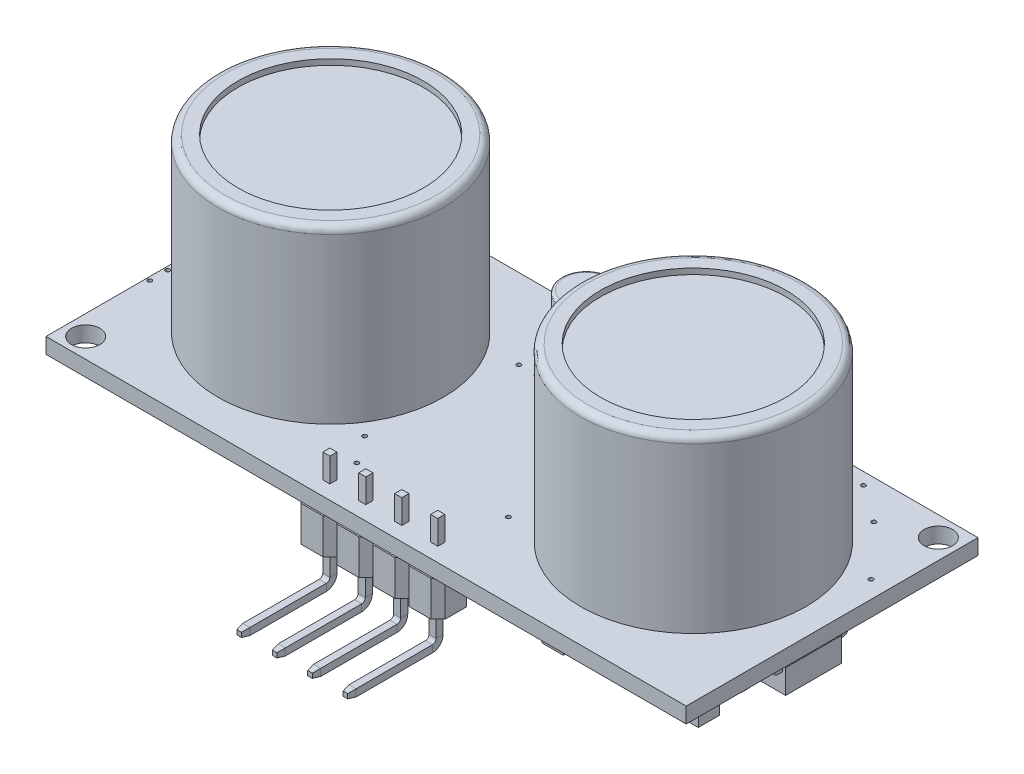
SolidWorks part; units mm, degrees
other "Camera2"
other "Camera3"
other "Camera5"
other "Camera6"
ref_plane "Front Plane" through (0, 0, 0) normal (0, 0, 1) x (1, 0, 0)
ref_plane "Top Plane" through (0, 0, 0) normal (0, 1, 0) x (1, 0, 0)
ref_plane "Right Plane" through (0, 0, 0) normal (1, 0, 0) x (0, 0, -1)
sketch "Sketch1" plane through (0, 0, 0) normal (0, 1, 0) x (1, 0, 0)
  line L1 (22.6, -10.3) -> (-22.6, -10.3)
  line L2 (22.6, -10.3) -> (22.6, 10.3)
  line L3 (22.6, 10.3) -> (-22.6, 10.3)
  line L4 (-22.6, -10.3) -> (-22.6, 10.3)
  line L5 (22.6, -10.3) -> (-22.6, 10.3) construction
  line L6 (22.6, 10.3) -> (-22.6, -10.3) construction
  point P0 (0, 0)
  dimension "D1" = 45.2
  dimension "D2" = 20.6
extrude "Boss-Extrude1" add sketch "Sketch1" along normal blind 1.1
sketch "Sketch2" plane through (0, 1.1, 0) normal (0, 1, 0) x (1, 0, 0)
  line L0 (-22.6, 0) -> (22.6, 0) construction
  line L1 (-22.6, 10.3) -> (-22.6, -10.3) construction
  line L2 (22.6, -10.3) -> (22.6, 10.3) construction
  line L3 (0, 10.3) -> (0, -10.3) construction
  line L4 (22.6, 10.3) -> (-22.6, 10.3) construction
  line L5 (-22.6, -10.3) -> (22.6, -10.3) construction
  circle A0 centre (12.8, 0) radius 7.95
  circle A1 centre (-12.8, 0) radius 7.95
  point P16 (-20.75, 0)
  point P17 (4.85, 0)
  point P18 (-12.8, 7.95)
  point P19 (-4.85, 0)
  point P22 (-12.8, -7.95)
  dimension "D1" = 15.9
  dimension "D3" = 9.7
extrude "Boss-Extrude2" add sketch "Sketch2" along normal blind 12.1
sketch "Sketch3" plane through (0, 0, 0) normal (0, -1, 0) x (1, 0, 0)
  line L0 (0, 10.3) -> (0, 7.8) construction
  line L1 (1.02, 9.3) -> (1.02, 8.8) construction
  line L2 (-22.6, 10.3) -> (22.6, 10.3) construction
  line L3 (3.56, 9.3) -> (4.06, 9.3) construction
  line L30 (3.56, 9.3) -> (3.56, 8.8) construction
  line L31 (3.56, 8.8) -> (4.06, 8.8) construction
  line L32 (4.06, 9.3) -> (4.06, 8.8) construction
  line L33 (1.02, 9.3) -> (1.52, 9.3) construction
  line L34 (1.52, 9.3) -> (1.52, 8.8) construction
  line L35 (1.02, 8.8) -> (1.52, 8.8) construction
  line L36 (-1.52, 9.3) -> (-1.52, 8.8) construction
  line L37 (-1.52, 9.3) -> (-1.02, 9.3) construction
  line L38 (-1.02, 9.3) -> (-1.02, 8.8) construction
  line L39 (-1.52, 8.8) -> (-1.02, 8.8) construction
  line L40 (-4.06, 9.3) -> (-4.06, 8.8) construction
  line L41 (-4.06, 9.3) -> (-3.56, 9.3) construction
  line L42 (-3.56, 9.3) -> (-3.56, 8.8) construction
  line L43 (-4.06, 8.8) -> (-3.56, 8.8) construction
  line L44 (-1.02, 9.3) -> (1.02, 9.3) construction
  line L45 (-1.52, 9.3) -> (-3.56, 9.3) construction
  line L46 (5.08, 10.3) -> (-5.08, 10.3) construction
  line L47 (5.08, 10.3) -> (5.08, 7.8) construction
  line L48 (5.08, 7.8) -> (-5.08, 7.8) construction
  line L49 (-5.08, 10.3) -> (-5.08, 7.8) construction
  line L50 (1.52, 9.3) -> (3.56, 9.3) construction
  line L51 (-2.54, 9.3) -> (-2.54, 10.3) construction
  line L52 (-4.58, 10.3) -> (-5.08, 9.8)
  line L53 (-5.08, 9.05) -> (5.08, 9.05) construction
  line L54 (-4.58, 7.8) -> (-5.08, 8.3)
  line L55 (-3.81, 9.3) -> (-3.81, 8.8) construction
  line L56 (-3.04, 7.8) -> (-2.54, 8.3)
  line L57 (-3.04, 10.3) -> (-2.54, 9.8)
  line L58 (-3.56, 8.8) -> (-2.54, 8.8) construction
  line L59 (-4.06, 8.8) -> (-5.08, 8.8) construction
  line L60 (-2.04, 7.8) -> (-2.54, 8.3)
  line L61 (-0.5, 7.8) -> (0, 8.3)
  line L62 (-0.5, 10.3) -> (0, 9.8)
  line L63 (-2.04, 10.3) -> (-2.54, 9.8)
  line L64 (0.5, 7.8) -> (0, 8.3)
  line L65 (2.04, 7.8) -> (2.54, 8.3)
  line L66 (3.04, 7.8) -> (2.54, 8.3)
  line L67 (4.58, 7.8) -> (5.08, 8.3)
  line L68 (4.58, 10.3) -> (5.08, 9.8)
  line L69 (3.04, 10.3) -> (2.54, 9.8)
  line L70 (2.04, 10.3) -> (2.54, 9.8)
  line L71 (0.5, 10.3) -> (0, 9.8)
  line L72 (-5.08, 9.8) -> (-5.08, 8.3)
  line L73 (-4.58, 7.8) -> (-3.04, 7.8)
  line L74 (-2.04, 7.8) -> (-0.5, 7.8)
  line L75 (0.5, 7.8) -> (2.04, 7.8)
  line L76 (3.04, 7.8) -> (4.58, 7.8)
  line L77 (5.08, 9.8) -> (5.08, 8.3)
  line L78 (4.58, 10.3) -> (3.04, 10.3)
  line L79 (2.04, 10.3) -> (0.5, 10.3)
  line L80 (-0.5, 10.3) -> (-2.04, 10.3)
  line L81 (-3.04, 10.3) -> (-4.58, 10.3)
  point P1 (0, 10.3)
  point P4 (-4.06, 9.05)
  point P5 (-5.08, 9.05)
  point P15 (0, 10.3)
  point P16 (0, 9.3)
  dimension "D1" = 2.5
  dimension "D3" = 0.5
  dimension "D6" = 0.5
  dimension "D5" = 2.54
  dimension "D7" = 0.5
  dimension "D4" = 4
extrude "Boss-Extrude3" add sketch "Sketch3" along normal blind 2.6
sketch "Sketch5" plane through (0, 0, 0) normal (0, -1, 0) x (1, 0, 0)
  line L8 (-4.9, 10.2) -> (-4.9, 7.9)
  line L9 (-4.9, 7.9) -> (4.9, 7.9)
  line L10 (4.9, 10.2) -> (4.9, 7.9)
  line L11 (-4.9, 10.2) -> (4.9, 10.2)
  line L13 (5.296, 7.6186) -> (-5.296, 7.6186)
  line L14 (5.296, 7.6186) -> (5.296, 10.5247)
  line L15 (5.296, 10.5247) -> (-5.296, 10.5247)
  line L16 (-5.296, 7.6186) -> (-5.296, 10.5247)
  line L17 (5.296, 7.6186) -> (-5.296, 10.5247) construction
  line L18 (5.296, 10.5247) -> (-5.296, 7.6186) construction
  point P0 (0, 9.0716)
extrude "Cut-Extrude2" cut sketch "Sketch5" along normal blind 0.1
sketch "Sketch6" plane through (0, -2.6, 0) normal (0, -1, 0) x (1, 0, 0)
  line L3 (-3.81, 10.3) -> (-3.81, 7.8) construction
  line L5 (-3.04, 10.3) -> (-4.58, 10.3) construction
  line L10 (-4.58, 7.8) -> (-3.04, 7.8) construction
  line L11 (-5.08, 9.05) -> (-2.54, 9.05) construction
  line L12 (-5.08, 9.8) -> (-5.08, 8.3) construction
  line L14 (-3.56, 8.8) -> (-4.06, 8.8)
  line L15 (-3.56, 8.8) -> (-3.56, 9.3)
  line L16 (-3.56, 9.3) -> (-4.06, 9.3)
  line L17 (-4.06, 8.8) -> (-4.06, 9.3)
  line L18 (-3.56, 8.8) -> (-4.06, 9.3) construction
  line L19 (-3.56, 9.3) -> (-4.06, 8.8) construction
  point P11 (-3.81, 9.05)
  dimension "D1" = 0.5
ref_plane "Plane1" through (-3.81, 0, 0) normal (1, 0, 0) x (0, 0, -1)
sketch "Sketch7" plane through (-3.81, 0, 0) normal (1, 0, 0) x (0, 0, -1)
  line L0 (-9.05, -2.6) -> (-9.05, -4.6)
  line L2 (-9.55, -5.1) -> (-14.95, -5.1)
  arc A0 (-9.05, -4.6) -> (-9.55, -5.1) centre (-9.55, -4.6) cw
  point P7 (-9.05, -5.1)
  dimension "D3" = 0.5
  dimension "D1" = 2.5
  dimension "D2" = 5.9
sweep "Sweep1" add profiles "Sketch6" path "Sketch7"
sketch "Sketch8" plane through (0, 0, 14.95) normal (0, 0, 1) x (1, 0, 0)
  line L4 (-4.06, -4.85) -> (-4.06, -5.35)
  line L5 (-3.56, -4.85) -> (-4.06, -4.85)
  line L6 (-4.06, -4.85) -> (-4.06, -5.35)
  line L7 (-4.06, -5.35) -> (-3.56, -5.35)
  line L9 (-3.56, -4.85) -> (-4.06, -4.85)
  line L12 (-4.06, -5.35) -> (-3.56, -5.35)
  line L13 (-3.56, -5.35) -> (-3.56, -4.85)
  line L14 (-3.56, -5.35) -> (-3.56, -4.85)
  dimension "D1" = 0
extrude "Boss-Extrude4" add sketch "Sketch8" along normal blind 0.5 draft 10
pattern_linear "LPattern1" count 4 spacing 2.5 along (1, 0, 0) of "Boss-Extrude4", "Sweep1"
sketch "Sketch9" plane through (0, 13.2, 0) normal (0, 1, 0) x (1, 0, 0)
  circle A0 centre (12.8, 0) radius 6.55
  circle A1 centre (12.8, 0) radius 7.95
  circle A2 centre (12.8, 0) radius 7.95 construction
  dimension "D1" = 0
  dimension "D2" = 1.4
extrude "Cut-Extrude3" cut sketch "Sketch9" against normal blind 10
sketch "Sketch10" plane through (0, 3.2, 0) normal (0, 1, 0) x (1, 0, 0)
  circle A0 centre (12.8, 0) radius 6.55 construction
  circle A1 centre (12.8, 0) radius 6.55 construction
  circle A2 centre (12.8, 0) radius 5.35
  dimension "D1" = 1.2
extrude "Boss-Extrude5" add sketch "Sketch10" along normal offset from surface (1 mm away) 9
sketch "Sketch11" plane through (0, 4.2, 0) normal (0, 1, 0) x (1, 0, 0)
  circle A0 centre (12.8, 0) radius 5.35 construction
  circle A1 centre (12.8, 0) radius 5.35 construction
  circle A2 centre (12.8, 0) radius 3.55
  dimension "D1" = 1.8
extrude "Boss-Extrude6" add sketch "Sketch11" along normal blind 1
mirror "Mirror1" about plane through (0, 0, 0) normal (1, 0, 0) of "Cut-Extrude3", "Boss-Extrude5", "Boss-Extrude6"
sketch "Sketch16" plane through (0, 1.1, 0) normal (0, 1, 0) x (1, 0, 0)
  line L0 (-2.85, 8.1) -> (2.85, 8.1) construction
  line L1 (-2.85, 10.3) -> (2.85, 10.3)
  line L2 (-2.85, 5.9) -> (2.85, 5.9)
  line L3 (0, 0) -> (0, 10.3) construction
  line L4 (22.6, 10.3) -> (-22.6, 10.3) construction
  arc A0 (-2.85, 10.3) -> (-2.85, 5.9) centre (-2.85, 8.1) ccw
  arc A1 (2.85, 5.9) -> (2.85, 10.3) centre (2.85, 8.1) ccw
  point P2 (0, 8.1)
  point P7 (-5.05, 8.1)
  point P8 (5.05, 8.1)
  dimension "D1" = 10.1
  dimension "D2" = 4.4
extrude "Boss-Extrude10" add sketch "Sketch16" along normal blind 0.7
sketch "Sketch17" plane through (0, 1.8, 0) normal (0, 1, 0) x (1, 0, 0)
  line L0 (-2.85, 8.1) -> (2.85, 8.1) construction
  line L1 (-2.85, 9.85) -> (2.85, 9.85)
  line L2 (-2.85, 6.35) -> (2.85, 6.35)
  line L3 (0, 0) -> (0, 10.3) construction
  line L4 (2.85, 10.3) -> (-2.85, 10.3) construction
  line L5 (-2.85, 5.9) -> (2.85, 5.9) construction
  arc A0 (-2.85, 9.85) -> (-2.85, 6.35) centre (-2.85, 8.1) ccw
  arc A1 (2.85, 6.35) -> (2.85, 9.85) centre (2.85, 8.1) ccw
  point P2 (0, 8.1)
  point P12 (-4.6, 8.1)
  point P13 (4.6, 8.1)
  dimension "D1" = 3.5
  dimension "D2" = 9.2
extrude "Boss-Extrude11" add sketch "Sketch17" along normal blind 2.8
sketch "Sketch18" plane through (0, 1.1, 0) normal (0, 1, 0) x (1, 0, 0)
  line L0 (22.6, 10.3) -> (2.85, 10.3) construction
  line L2 (22.6, -10.3) -> (22.6, 10.3) construction
  line L4 (-22.6, -10.3) -> (22.6, -10.3) construction
  line L5 (-22.6, 10.3) -> (-22.6, -10.3) construction
  circle A0 centre (-21.2, -8.9) radius 1
  circle A1 centre (21.2, 8.9) radius 1
  point P3 (21.2, 9.9)
  point P4 (22.2, 8.9)
  point P16 (-22.2, -8.9)
  point P19 (-21.2, -9.9)
  dimension "D1" = 2
  dimension "D2" = 0.4
  dimension "D3" = 0.4
  dimension "D4" = 0.4
  dimension "D5" = 0.4
extrude "Cut-Extrude4" cut sketch "Sketch18" against normal through all
sketch "Sketch19" plane through (0, 0, 0) normal (0, -1, 0) x (1, 0, 0)
  line L0 (-12.8, 7.95) -> (-12.8, -7.95) construction
  line L1 (0, 10.3) -> (0, -10.3) construction
  line L2 (-22.6, 10.3) -> (22.6, 10.3) construction
  line L3 (22.6, -10.3) -> (-22.6, -10.3) construction
  line L4 (-22.6, 0) -> (22.6, 0) construction
  line L5 (-22.6, -10.3) -> (-22.6, 10.3) construction
  line L6 (22.6, 10.3) -> (22.6, -10.3) construction
  circle A0 centre (12.8, 0) radius 7.95 construction
  circle A1 centre (-12.8, 0) radius 7.95 construction
  circle A2 centre (12.8, 0) radius 7.95 construction
  circle A3 centre (-12.8, 0) radius 7.95 construction
  circle A4 centre (-12.8, 4.65) radius 0.5
  circle A5 centre (-12.8, -4.65) radius 0.5
  circle A6 centre (12.8, -4.65) radius 0.5
  circle A7 centre (12.8, 4.65) radius 0.5
  point P10 (-12.8, 5.15)
  dimension "D2" = 1
  dimension "D1" = 2.8
extrude "Boss-Extrude12" add sketch "Sketch19" along normal up to surface (2.6 mm away)
sketch "Sketch20" plane through (0, 1.1, 0) normal (0, 1, 0) x (1, 0, 0)
  line L0 (-2.85, 6) -> (2.85, 6)
  line L1 (2.85, 10.2) -> (-2.85, 10.2)
  line L2 (-2.85, 5.9) -> (2.85, 5.9)
  line L3 (2.85, 10.3) -> (-2.85, 10.3)
  line L4 (-2.85, 5.9) -> (2.85, 5.9)
  line L5 (2.85, 10.3) -> (-2.85, 10.3)
  arc A0 (-2.85, 10.2) -> (-2.85, 6) centre (-2.85, 8.1) ccw
  arc A1 (2.85, 6) -> (2.85, 10.2) centre (2.85, 8.1) ccw
  arc A2 (-2.85, 10.3) -> (-2.85, 5.9) centre (-2.85, 8.1) ccw
  arc A3 (2.85, 5.9) -> (2.85, 10.3) centre (2.85, 8.1) ccw
  arc A4 (-2.85, 10.3) -> (-2.85, 5.9) centre (-2.85, 8.1) ccw
  arc A5 (2.85, 5.9) -> (2.85, 10.3) centre (2.85, 8.1) ccw
  dimension "D1" = 0
  dimension "D2" = 0.1
extrude "Cut-Extrude5" cut sketch "Sketch20" along normal blind 0.1
fillet "Fillet1" radius 0.5 2 edges at (12.8, 13.2, 7.95) (-12.8, 13.2, -7.95)
sketch "Sketch22" plane through (0, 0, 0) normal (0, -1, 0) x (1, 0, 0)
  line L0 (-18.5901, -8.2805) -> (-19.3901, -8.2805)
  line L1 (-6.3572, -1.5969) -> (-7.1572, -1.5969)
  line L2 (-6.3572, -1.5969) -> (-6.3572, -0.0969)
  line L3 (-6.3572, -0.0969) -> (-7.1572, -0.0969)
  line L4 (-7.1572, -1.5969) -> (-7.1572, -0.0969)
  line L5 (-18.5901, -8.2805) -> (-18.5901, -6.7805)
  line L6 (-18.5901, -6.7805) -> (-19.3901, -6.7805)
  line L7 (-19.3901, -8.2805) -> (-19.3901, -6.7805)
  line L8 (-20.5477, -8.2805) -> (-21.3477, -8.2805)
  line L9 (-20.5477, -8.2805) -> (-20.5477, -6.7805)
  line L10 (-20.5477, -6.7805) -> (-21.3477, -6.7805)
  line L11 (-21.3477, -8.2805) -> (-21.3477, -6.7805)
  line L12 (17.0593, -9.1198) -> (16.2593, -9.1198)
  line L13 (17.0593, -9.1198) -> (17.0593, -7.6198)
  line L14 (17.0593, -7.6198) -> (16.2593, -7.6198)
  line L15 (16.2593, -9.1198) -> (16.2593, -7.6198)
  line L16 (9.5458, -1.5969) -> (8.7458, -1.5969)
  line L17 (9.5458, -1.5969) -> (9.5458, -0.0969)
  line L18 (9.5458, -0.0969) -> (8.7458, -0.0969)
  line L19 (8.7458, -1.5969) -> (8.7458, -0.0969)
  line L20 (11.584, -1.5969) -> (10.784, -1.5969)
  line L21 (11.584, -1.5969) -> (11.584, -0.0969)
  line L22 (11.584, -0.0969) -> (10.784, -0.0969)
  line L23 (10.784, -1.5969) -> (10.784, -0.0969)
  line L24 (20.4564, 7.7857) -> (19.6564, 7.7857)
  line L25 (20.4564, 7.7857) -> (20.4564, 9.2857)
  line L26 (20.4564, 9.2857) -> (19.6564, 9.2857)
  line L27 (19.6564, 7.7857) -> (19.6564, 9.2857)
  line L28 (22.4386, 7.7857) -> (21.6386, 7.7857)
  line L29 (22.4386, 7.7857) -> (22.4386, 9.2857)
  line L30 (22.4386, 9.2857) -> (21.6386, 9.2857)
  line L31 (21.6386, 7.7857) -> (21.6386, 9.2857)
  line L32 (8.7458, 5.9994) -> (7.2458, 5.9994)
  line L33 (13.2617, 9.6338) -> (11.7617, 9.6338)
  line L34 (13.2617, 9.6338) -> (13.2617, 8.8338)
  line L35 (13.2617, 8.8338) -> (11.7617, 8.8338)
  line L36 (11.7617, 9.6338) -> (11.7617, 8.8338)
  line L37 (8.7458, 5.9994) -> (8.7458, 5.1994)
  line L38 (8.7458, 5.1994) -> (7.2458, 5.1994)
  line L39 (7.2458, 5.9994) -> (7.2458, 5.1994)
  line L40 (8.7458, 4.008) -> (7.2458, 4.008)
  line L41 (8.7458, 4.008) -> (8.7458, 3.208)
  line L42 (8.7458, 3.208) -> (7.2458, 3.208)
  line L43 (7.2458, 4.008) -> (7.2458, 3.208)
  line L44 (-10.4753, 1.2365) -> (-11.9753, 1.2365)
  line L45 (-10.4753, 1.2365) -> (-10.4753, 0.4365)
  line L46 (-10.4753, 0.4365) -> (-11.9753, 0.4365)
  line L47 (-11.9753, 1.2365) -> (-11.9753, 0.4365)
  line L48 (-10.4753, -0.8468) -> (-11.9753, -0.8468)
  line L49 (-10.4753, -0.8468) -> (-10.4753, -1.6468)
  line L50 (-10.4753, -1.6468) -> (-11.9753, -1.6468)
  line L51 (-11.9753, -0.8468) -> (-11.9753, -1.6468)
  line L52 (-16.5964, 7.0747) -> (-18.0964, 7.0747)
  line L53 (-16.5964, 7.0747) -> (-16.5964, 6.2747)
  line L54 (-16.5964, 6.2747) -> (-18.0964, 6.2747)
  line L55 (-18.0964, 7.0747) -> (-18.0964, 6.2747)
  line L56 (0.9741, -9.1198) -> (0.1741, -9.1198)
  line L57 (0.9741, -9.1198) -> (0.9741, -7.6198)
  line L58 (0.9741, -7.6198) -> (0.1741, -7.6198)
  line L59 (0.1741, -9.1198) -> (0.1741, -7.6198)
  line L60 (-4.3011, -9.1198) -> (-5.1011, -9.1198)
  line L61 (-4.3011, -9.1198) -> (-4.3011, -7.6198)
  line L62 (-4.3011, -7.6198) -> (-5.1011, -7.6198)
  line L63 (-5.1011, -9.1198) -> (-5.1011, -7.6198)
  dimension "D1" = 1.5
  dimension "D2" = 0.8
extrude "Boss-Extrude13" add sketch "Sketch22" along normal blind 0.8
sketch "Sketch23" plane through (0, 0, 0) normal (0, -1, 0) x (1, 0, 0)
  line L0 (19.0593, -9.1198) -> (19.0593, -7.6198)
  line L1 (19.0593, -7.6198) -> (18.2593, -7.6198)
  line L2 (18.2593, -7.6198) -> (18.2593, -9.1198)
  line L3 (18.2593, -9.1198) -> (19.0593, -9.1198)
  line L4 (11.584, -1.5969) -> (11.584, -0.0969)
  line L5 (11.584, -0.0969) -> (10.784, -0.0969)
  line L6 (10.784, -0.0969) -> (10.784, -1.5969)
  line L7 (10.784, -1.5969) -> (11.584, -1.5969)
  line L8 (11.584, -1.5969) -> (11.584, -0.0969) construction
  line L9 (11.584, -0.0969) -> (10.784, -0.0969) construction
  line L10 (10.784, -0.0969) -> (10.784, -1.5969) construction
  line L11 (10.784, -1.5969) -> (11.584, -1.5969) construction
  line L12 (15.0593, -9.1198) -> (15.0593, -7.6198)
  line L13 (15.0593, -7.6198) -> (14.2593, -7.6198)
  line L14 (14.2593, -7.6198) -> (14.2593, -9.1198)
  line L15 (14.2593, -9.1198) -> (15.0593, -9.1198)
  line L16 (13.0593, -9.1198) -> (13.0593, -7.6198)
  line L17 (13.0593, -7.6198) -> (12.2593, -7.6198)
  line L18 (12.2593, -7.6198) -> (12.2593, -9.1198)
  line L19 (12.2593, -9.1198) -> (13.0593, -9.1198)
  line L20 (6.9286, -9.1198) -> (6.9286, -7.6198)
  line L21 (6.9286, -7.6198) -> (6.1286, -7.6198)
  line L22 (6.1286, -7.6198) -> (6.1286, -9.1198)
  line L23 (6.1286, -9.1198) -> (6.9286, -9.1198)
  line L24 (5.0244, -9.1198) -> (5.0244, -7.6198)
  line L25 (5.0244, -7.6198) -> (4.2244, -7.6198)
  line L26 (4.2244, -7.6198) -> (4.2244, -9.1198)
  line L27 (4.2244, -9.1198) -> (5.0244, -9.1198)
  line L28 (15.0896, -5.5062) -> (15.0896, -4.0062)
  line L29 (15.0896, -4.0062) -> (14.2896, -4.0062)
  line L30 (14.2896, -4.0062) -> (14.2896, -5.5062)
  line L31 (14.2896, -5.5062) -> (15.0896, -5.5062)
  line L32 (7.5058, -1.5969) -> (7.5058, -0.0969)
  line L33 (7.5058, -0.0969) -> (6.7058, -0.0969)
  line L34 (6.7058, -0.0969) -> (6.7058, -1.5969)
  line L35 (6.7058, -1.5969) -> (7.5058, -1.5969)
  line L36 (20.4564, 9.2857) -> (19.6564, 9.2857) construction
  line L37 (8.7458, -0.0969) -> (8.7458, -1.5969) construction
  line L38 (17.0593, -9.1198) -> (17.0593, -7.6198) construction
  line L39 (16.2593, -7.6198) -> (16.2593, -9.1198) construction
  line L40 (16.2593, -9.1198) -> (17.0593, -9.1198) construction
  line L41 (11.584, 1.9889) -> (11.584, 3.4889)
  line L42 (11.584, 3.4889) -> (10.784, 3.4889)
  line L43 (10.784, 3.4889) -> (10.784, 1.9889)
  line L44 (10.784, 1.9889) -> (11.584, 1.9889)
  line L49 (20.4564, 9.2857) -> (19.6564, 9.2857) construction
  line L50 (18.4764, 7.7857) -> (18.4764, 9.2857)
  line L51 (18.4764, 9.2857) -> (17.6764, 9.2857)
  line L52 (17.6764, 9.2857) -> (17.6764, 7.7857)
  line L53 (17.6764, 7.7857) -> (18.4764, 7.7857)
  line L54 (16.4964, 7.7857) -> (16.4964, 9.2857)
  line L55 (16.4964, 9.2857) -> (15.6964, 9.2857)
  line L56 (15.6964, 9.2857) -> (15.6964, 7.7857)
  line L57 (15.6964, 7.7857) -> (16.4964, 7.7857)
  line L58 (9.5539, 7.7857) -> (9.5539, 9.2857)
  line L59 (9.5539, 9.2857) -> (8.7539, 9.2857)
  line L60 (8.7539, 9.2857) -> (8.7539, 7.7857)
  line L61 (8.7539, 7.7857) -> (9.5539, 7.7857)
  line L62 (-6.3765, -6.4999) -> (-6.3765, -4.9999)
  line L63 (-6.3765, -4.9999) -> (-7.1765, -4.9999)
  line L64 (-7.1765, -4.9999) -> (-7.1765, -6.4999)
  line L65 (-7.1765, -6.4999) -> (-6.3765, -6.4999)
  line L66 (-9.6915, -9.1654) -> (-9.6915, -8.3654)
  line L67 (-9.6915, -8.3654) -> (-11.1915, -8.3654)
  line L68 (-11.1915, -8.3654) -> (-11.1915, -9.1654)
  line L69 (-11.1915, -9.1654) -> (-9.6915, -9.1654)
  line L70 (-10.4753, -1.6468) -> (-10.4753, -0.8468) construction
  line L71 (-11.9753, -1.6468) -> (-10.4753, -1.6468) construction
  line L72 (21.7374, -5.2907) -> (21.7374, -4.4907)
  line L73 (21.7374, -4.4907) -> (20.2374, -4.4907)
  line L74 (20.2374, -4.4907) -> (20.2374, -5.2907)
  line L75 (20.2374, -5.2907) -> (21.7374, -5.2907)
  line L76 (18.2271, -5.2907) -> (18.2271, -4.4907)
  line L77 (18.2271, -4.4907) -> (16.7271, -4.4907)
  line L78 (16.7271, -4.4907) -> (16.7271, -5.2907)
  line L79 (16.7271, -5.2907) -> (18.2271, -5.2907)
  line L80 (7.9033, -6.0907) -> (7.9033, -5.2907)
  line L81 (7.9033, -5.2907) -> (6.4033, -5.2907)
  line L82 (6.4033, -5.2907) -> (6.4033, -6.0907)
  line L83 (6.4033, -6.0907) -> (7.9033, -6.0907)
  line L84 (7.9033, -4.2251) -> (7.9033, -3.4251)
  line L85 (7.9033, -3.4251) -> (6.4033, -3.4251)
  line L86 (6.4033, -3.4251) -> (6.4033, -4.2251)
  line L87 (6.4033, -4.2251) -> (7.9033, -4.2251)
  line L88 (8.7539, 1.218) -> (8.7539, 2.018)
  line L89 (8.7539, 2.018) -> (7.2539, 2.018)
  line L90 (7.2539, 2.018) -> (7.2539, 1.218)
  line L91 (7.2539, 1.218) -> (8.7539, 1.218)
  line L95 (7.2458, 3.208) -> (8.7458, 3.208) construction
  line L96 (19.6564, 9.2857) -> (19.6564, 7.7857) construction
  line L97 (19.6564, 7.7857) -> (20.4564, 7.7857) construction
  line L98 (22.0182, 5.6409) -> (22.0182, 6.4409)
  line L99 (22.0182, 6.4409) -> (20.5182, 6.4409)
  line L100 (20.5182, 6.4409) -> (20.5182, 5.6409)
  line L101 (20.5182, 5.6409) -> (22.0182, 5.6409)
  line L102 (0.1436, 5.7987) -> (0.1436, 6.5987)
  line L103 (0.1436, 6.5987) -> (-1.3564, 6.5987)
  line L104 (-1.3564, 6.5987) -> (-1.3564, 5.7987)
  line L105 (-1.3564, 5.7987) -> (0.1436, 5.7987)
  line L106 (-3.5718, 5.7987) -> (-3.5718, 6.5987)
  line L107 (-3.5718, 6.5987) -> (-5.0718, 6.5987)
  line L108 (-5.0718, 6.5987) -> (-5.0718, 5.7987)
  line L109 (-5.0718, 5.7987) -> (-3.5718, 5.7987)
  dimension "D2" = 1.24
  dimension "D3" = 1.2
  dimension "D4" = 1.2
  dimension "D5" = 1.2
  dimension "D6" = 1.19
  dimension "D7" = 1.18
  dimension "D8" = 1.18
  dimension "D1" = 0
extrude "Boss-Extrude14" add sketch "Sketch23" along normal blind 0.4
sketch "Sketch28" plane through (0, 0, 0) normal (0, -1, 0) x (1, 0, 0)
  line L0 (-14.7018, -9.8332) -> (-15.943, -9.8332)
  line L1 (10.4056, -10.1201) -> (9.1644, -10.1201)
  line L2 (10.4056, -10.1201) -> (10.4056, -7.2537)
  line L3 (10.4056, -7.2537) -> (9.1644, -7.2537)
  line L4 (9.1644, -10.1201) -> (9.1644, -7.2537)
  line L5 (-14.7018, -9.8332) -> (-14.7018, -6.9668)
  line L6 (-14.7018, -6.9668) -> (-15.943, -6.9668)
  line L7 (-15.943, -9.8332) -> (-15.943, -6.9668)
extrude "Boss-Extrude18" add sketch "Sketch28" along normal blind 1
sketch "Sketch25" plane through (0, 0, 0) normal (0, -1, 0) x (1, 0, 0)
  line L0 (13.779, 1.218) -> (22.9246, 1.218) construction
  line L1 (22.3032, -1.404) -> (21.5544, -1.404)
  line L2 (22.3032, -1.404) -> (22.3032, -0.5436)
  line L3 (22.3032, -0.5436) -> (21.5544, -0.5436)
  line L4 (21.5544, -1.404) -> (21.5544, -0.5436)
  line L5 (21.0532, -1.404) -> (21.0532, -0.5436)
  line L6 (21.0532, -1.404) -> (20.3044, -1.404)
  line L7 (20.3044, -1.404) -> (20.3044, -0.5436)
  line L8 (21.0532, -0.5436) -> (20.3044, -0.5436)
  line L9 (19.8032, -1.404) -> (19.8032, -0.5436)
  line L10 (19.8032, -1.404) -> (19.0544, -1.404)
  line L11 (19.0544, -1.404) -> (19.0544, -0.5436)
  line L12 (19.8032, -0.5436) -> (19.0544, -0.5436)
  line L13 (18.5532, -1.404) -> (18.5532, -0.5436)
  line L14 (18.5532, -1.404) -> (17.8044, -1.404)
  line L15 (17.8044, -1.404) -> (17.8044, -0.5436)
  line L16 (18.5532, -0.5436) -> (17.8044, -0.5436)
  line L17 (17.3032, -1.404) -> (17.3032, -0.5436)
  line L18 (17.3032, -1.404) -> (16.5544, -1.404)
  line L19 (16.5544, -1.404) -> (16.5544, -0.5436)
  line L20 (17.3032, -0.5436) -> (16.5544, -0.5436)
  line L21 (16.0532, -1.404) -> (16.0532, -0.5436)
  line L22 (16.0532, -1.404) -> (15.3044, -1.404)
  line L23 (15.3044, -1.404) -> (15.3044, -0.5436)
  line L24 (16.0532, -0.5436) -> (15.3044, -0.5436)
  line L25 (14.8032, -1.404) -> (14.8032, -0.5436)
  line L26 (14.8032, -1.404) -> (14.0544, -1.404)
  line L27 (14.0544, -1.404) -> (14.0544, -0.5436)
  line L28 (14.8032, -0.5436) -> (14.0544, -0.5436)
  line L29 (14.8032, 3.8399) -> (14.0544, 3.8399)
  line L30 (14.0544, 3.8399) -> (14.0544, 2.9795)
  line L31 (14.8032, 2.9795) -> (14.0544, 2.9795)
  line L32 (14.8032, 3.8399) -> (14.8032, 2.9795)
  line L33 (16.0532, 3.8399) -> (15.3044, 3.8399)
  line L34 (15.3044, 3.8399) -> (15.3044, 2.9795)
  line L35 (16.0532, 2.9795) -> (15.3044, 2.9795)
  line L36 (16.0532, 3.8399) -> (16.0532, 2.9795)
  line L37 (17.3032, 3.8399) -> (16.5544, 3.8399)
  line L38 (16.5544, 3.8399) -> (16.5544, 2.9795)
  line L39 (17.3032, 2.9795) -> (16.5544, 2.9795)
  line L40 (17.3032, 3.8399) -> (17.3032, 2.9795)
  line L41 (18.5532, 3.8399) -> (17.8044, 3.8399)
  line L42 (17.8044, 3.8399) -> (17.8044, 2.9795)
  line L43 (18.5532, 2.9795) -> (17.8044, 2.9795)
  line L44 (18.5532, 3.8399) -> (18.5532, 2.9795)
  line L45 (19.8032, 3.8399) -> (19.0544, 3.8399)
  line L46 (19.0544, 3.8399) -> (19.0544, 2.9795)
  line L47 (19.8032, 2.9795) -> (19.0544, 2.9795)
  line L48 (19.8032, 3.8399) -> (19.8032, 2.9795)
  line L49 (21.0532, 3.8399) -> (20.3044, 3.8399)
  line L50 (20.3044, 3.8399) -> (20.3044, 2.9795)
  line L51 (21.0532, 2.9795) -> (20.3044, 2.9795)
  line L52 (21.0532, 3.8399) -> (21.0532, 2.9795)
  line L53 (22.3032, 2.9795) -> (21.5544, 2.9795)
  line L54 (21.5544, 3.8399) -> (21.5544, 2.9795)
  line L55 (22.3032, 3.8399) -> (21.5544, 3.8399)
  line L56 (22.3032, 3.8399) -> (22.3032, 2.9795)
  line L57 (-4.8719, -0.2297) -> (4.191, -0.2297) construction
  line L58 (4.0156, 1.5572) -> (4.0156, 2.4175)
  line L59 (4.0156, 1.5572) -> (3.2667, 1.5572)
  line L60 (3.2667, 1.5572) -> (3.2667, 2.4175)
  line L61 (4.0156, 2.4175) -> (3.2667, 2.4175)
  line L62 (2.7156, 1.5572) -> (2.7156, 2.4175)
  line L63 (2.7156, 1.5572) -> (1.9667, 1.5572)
  line L64 (1.9667, 1.5572) -> (1.9667, 2.4175)
  line L65 (2.7156, 2.4175) -> (1.9667, 2.4175)
  line L66 (1.4156, 1.5572) -> (1.4156, 2.4175)
  line L67 (1.4156, 1.5572) -> (0.6667, 1.5572)
  line L68 (0.6667, 1.5572) -> (0.6667, 2.4175)
  line L69 (1.4156, 2.4175) -> (0.6667, 2.4175)
  line L70 (0.1156, 1.5572) -> (0.1156, 2.4175)
  line L71 (0.1156, 1.5572) -> (-0.6333, 1.5572)
  line L72 (-0.6333, 1.5572) -> (-0.6333, 2.4175)
  line L73 (0.1156, 2.4175) -> (-0.6333, 2.4175)
  line L74 (-1.1844, 1.5572) -> (-1.1844, 2.4175)
  line L75 (-1.1844, 1.5572) -> (-1.9333, 1.5572)
  line L76 (-1.9333, 1.5572) -> (-1.9333, 2.4175)
  line L77 (-1.1844, 2.4175) -> (-1.9333, 2.4175)
  line L78 (-2.4844, 1.5572) -> (-2.4844, 2.4175)
  line L79 (-2.4844, 1.5572) -> (-3.2333, 1.5572)
  line L80 (-3.2333, 1.5572) -> (-3.2333, 2.4175)
  line L81 (-2.4844, 2.4175) -> (-3.2333, 2.4175)
  line L82 (-3.7844, 1.5572) -> (-3.7844, 2.4175)
  line L83 (-3.7844, 1.5572) -> (-4.5333, 1.5572)
  line L84 (-4.5333, 1.5572) -> (-4.5333, 2.4175)
  line L85 (-3.7844, 2.4175) -> (-4.5333, 2.4175)
  line L86 (-3.7844, -2.0166) -> (-4.5333, -2.0166)
  line L87 (-4.5333, -2.0166) -> (-4.5333, -2.877)
  line L88 (-3.7844, -2.877) -> (-4.5333, -2.877)
  line L89 (-3.7844, -2.0166) -> (-3.7844, -2.877)
  line L90 (-2.4844, -2.0166) -> (-3.2333, -2.0166)
  line L91 (-3.2333, -2.0166) -> (-3.2333, -2.877)
  line L92 (-2.4844, -2.877) -> (-3.2333, -2.877)
  line L93 (-2.4844, -2.0166) -> (-2.4844, -2.877)
  line L94 (-1.1844, -2.0166) -> (-1.9333, -2.0166)
  line L95 (-1.9333, -2.0166) -> (-1.9333, -2.877)
  line L96 (-1.1844, -2.877) -> (-1.9333, -2.877)
  line L97 (-1.1844, -2.0166) -> (-1.1844, -2.877)
  line L98 (0.1156, -2.0166) -> (-0.6333, -2.0166)
  line L99 (-0.6333, -2.0166) -> (-0.6333, -2.877)
  line L100 (0.1156, -2.877) -> (-0.6333, -2.877)
  line L101 (0.1156, -2.0166) -> (0.1156, -2.877)
  line L102 (1.4156, -2.0166) -> (0.6667, -2.0166)
  line L103 (0.6667, -2.0166) -> (0.6667, -2.877)
  line L104 (1.4156, -2.877) -> (0.6667, -2.877)
  line L105 (1.4156, -2.0166) -> (1.4156, -2.877)
  line L106 (2.7156, -2.0166) -> (1.9667, -2.0166)
  line L107 (2.7156, -2.877) -> (1.9667, -2.877)
  line L108 (2.7156, -2.0166) -> (2.7156, -2.877)
  line L109 (1.9667, -2.0166) -> (1.9667, -2.877)
  line L110 (4.0156, -2.877) -> (3.2667, -2.877)
  line L111 (3.2667, -2.0166) -> (3.2667, -2.877)
  line L112 (4.0156, -2.0166) -> (3.2667, -2.0166)
  line L113 (4.0156, -2.0166) -> (4.0156, -2.877)
  line L114 (-18.5168, -5.3094) -> (-18.5168, 5.3896) construction
  line L115 (-16.8983, -4.1923) -> (-16.8983, -4.9411)
  line L116 (-16.8983, -4.9411) -> (-16.0379, -4.9411)
  line L117 (-16.0379, -4.1923) -> (-16.0379, -4.9411)
  line L118 (-16.8983, -4.1923) -> (-16.0379, -4.1923)
  line L119 (-16.8983, -2.8923) -> (-16.8983, -3.6411)
  line L120 (-16.8983, -3.6411) -> (-16.0379, -3.6411)
  line L121 (-16.0379, -2.8923) -> (-16.0379, -3.6411)
  line L122 (-16.8983, -2.8923) -> (-16.0379, -2.8923)
  line L123 (-16.8983, -1.5923) -> (-16.8983, -2.3411)
  line L124 (-16.8983, -2.3411) -> (-16.0379, -2.3411)
  line L125 (-16.0379, -1.5923) -> (-16.0379, -2.3411)
  line L126 (-16.8983, -1.5923) -> (-16.0379, -1.5923)
  line L127 (-16.8983, -0.2923) -> (-16.8983, -1.0411)
  line L128 (-16.8983, -1.0411) -> (-16.0379, -1.0411)
  line L129 (-16.0379, -0.2923) -> (-16.0379, -1.0411)
  line L130 (-16.8983, -0.2923) -> (-16.0379, -0.2923)
  line L131 (-16.8983, 1.0077) -> (-16.8983, 0.2589)
  line L132 (-16.8983, 0.2589) -> (-16.0379, 0.2589)
  line L133 (-16.0379, 1.0077) -> (-16.0379, 0.2589)
  line L134 (-16.8983, 1.0077) -> (-16.0379, 1.0077)
  line L135 (-16.8983, 2.3077) -> (-16.8983, 1.5589)
  line L136 (-16.8983, 1.5589) -> (-16.0379, 1.5589)
  line L137 (-16.0379, 2.3077) -> (-16.0379, 1.5589)
  line L138 (-16.8983, 2.3077) -> (-16.0379, 2.3077)
  line L139 (-16.8983, 3.6077) -> (-16.8983, 2.8589)
  line L140 (-16.8983, 2.8589) -> (-16.0379, 2.8589)
  line L141 (-16.0379, 3.6077) -> (-16.0379, 2.8589)
  line L142 (-16.8983, 3.6077) -> (-16.0379, 3.6077)
  line L143 (9.8769, -7.4374) -> (9.8769, -8.1862)
  line L148 (-16.8983, 4.9077) -> (-16.8983, 4.1589)
  line L149 (-16.8983, 4.1589) -> (-16.0379, 4.1589)
  line L150 (-16.0379, 4.9077) -> (-16.0379, 4.1589)
  line L151 (-16.8983, 4.9077) -> (-16.0379, 4.9077)
  line L152 (-20.1353, 4.9077) -> (-20.9957, 4.9077)
  line L153 (-20.9957, 4.9077) -> (-20.9957, 4.1589)
  line L154 (-20.1353, 4.1589) -> (-20.9957, 4.1589)
  line L155 (-20.1353, 4.9077) -> (-20.1353, 4.1589)
  line L156 (-20.1353, 3.6077) -> (-20.9957, 3.6077)
  line L157 (-20.9957, 3.6077) -> (-20.9957, 2.8589)
  line L158 (-20.1353, 2.8589) -> (-20.9957, 2.8589)
  line L159 (-20.1353, 3.6077) -> (-20.1353, 2.8589)
  line L160 (-20.1353, 2.3077) -> (-20.9957, 2.3077)
  line L161 (-20.9957, 2.3077) -> (-20.9957, 1.5589)
  line L162 (-20.1353, 1.5589) -> (-20.9957, 1.5589)
  line L163 (-20.1353, 2.3077) -> (-20.1353, 1.5589)
  line L164 (-20.1353, 1.0077) -> (-20.9957, 1.0077)
  line L165 (-20.9957, 1.0077) -> (-20.9957, 0.2589)
  line L166 (-20.1353, 0.2589) -> (-20.9957, 0.2589)
  line L167 (-20.1353, 1.0077) -> (-20.1353, 0.2589)
  line L168 (-20.1353, -0.2923) -> (-20.9957, -0.2923)
  line L169 (-20.9957, -0.2923) -> (-20.9957, -1.0411)
  line L170 (-20.1353, -1.0411) -> (-20.9957, -1.0411)
  line L171 (-20.1353, -0.2923) -> (-20.1353, -1.0411)
  line L172 (-20.1353, -1.5923) -> (-20.9957, -1.5923)
  line L173 (-20.9957, -1.5923) -> (-20.9957, -2.3411)
  line L174 (-20.1353, -2.3411) -> (-20.9957, -2.3411)
  line L175 (-20.1353, -1.5923) -> (-20.1353, -2.3411)
  line L176 (-20.1353, -2.8923) -> (-20.9957, -2.8923)
  line L177 (-20.9957, -2.8923) -> (-20.9957, -3.6411)
  line L178 (-20.1353, -3.6411) -> (-20.9957, -3.6411)
  line L179 (-20.1353, -2.8923) -> (-20.1353, -3.6411)
  line L180 (-20.1353, -4.1923) -> (-20.9957, -4.1923)
  line L181 (-20.9957, -4.1923) -> (-20.9957, -4.9411)
  line L182 (-20.1353, -4.9411) -> (-20.9957, -4.9411)
  line L183 (-20.1353, -4.1923) -> (-20.1353, -4.9411)
  line L184 (-15.0618, -8.8396) -> (-15.0618, -9.5884)
  line L185 (-15.0618, -9.5884) -> (-14.2014, -9.5884)
  line L186 (-14.2014, -8.8396) -> (-14.2014, -9.5884)
  line L187 (-15.0618, -8.8396) -> (-14.2014, -8.8396)
  line L188 (-15.0618, -7.1517) -> (-15.0618, -7.9006)
  line L189 (-15.0618, -7.9006) -> (-14.2014, -7.9006)
  line L190 (-14.2014, -7.1517) -> (-14.2014, -7.9006)
  line L191 (-15.0618, -7.1517) -> (-14.2014, -7.1517)
  line L192 (-16.4107, -7.968) -> (-16.4107, -8.7169)
  line L193 (-16.4107, -8.7169) -> (-15.5503, -8.7169)
  line L194 (-15.5503, -7.968) -> (-15.5503, -8.7169)
  line L195 (-16.4107, -7.968) -> (-15.5503, -7.968)
  line L196 (8.6201, -8.3048) -> (8.6201, -9.0536)
  line L197 (8.6201, -9.0536) -> (9.4805, -9.0536)
  line L198 (9.4805, -8.3048) -> (9.4805, -9.0536)
  line L199 (8.6201, -8.3048) -> (9.4805, -8.3048)
  line L200 (9.8769, -9.1898) -> (9.8769, -9.9387)
  line L201 (9.8769, -9.9387) -> (10.7373, -9.9387)
  line L202 (10.7373, -9.1898) -> (10.7373, -9.9387)
  line L203 (9.8769, -9.1898) -> (10.7373, -9.1898)
  line L204 (9.8769, -8.1862) -> (10.7373, -8.1862)
  line L205 (10.7373, -7.4374) -> (10.7373, -8.1862)
  line L206 (9.8769, -7.4374) -> (10.7373, -7.4374)
  dimension "D1" = 7
  dimension "D2" = 7
  dimension "D3" = 8
extrude "Boss-Extrude15" add sketch "Sketch25" along normal blind 0.5
ref_plane "Plane3" through (0, -0.15, 0) normal (0, -1, 0) x (-1, 0, 0)
sketch "Sketch26" plane through (0, -0.15, 0) normal (0, -1, 0) x (-1, 0, 0)
  line L1 (-22.5142, 0.766) -> (-13.8358, 0.766)
  line L2 (-22.5142, 0.766) -> (-22.5142, -3.1933)
  line L3 (-22.5142, -3.1933) -> (-13.8358, -3.1933)
  line L4 (-13.8358, 0.766) -> (-13.8358, -3.1933)
  line L5 (-4.1359, 2.2081) -> (4.7827, 2.2081)
  line L6 (-4.1359, 2.2081) -> (-4.1359, -1.7431)
  line L7 (-4.1359, -1.7431) -> (4.7827, -1.7431)
  line L8 (4.7827, 2.2081) -> (4.7827, -1.7431)
  line L9 (16.5604, 5.2191) -> (20.5121, 5.2191)
  line L10 (16.5604, 5.2191) -> (16.5604, -5.2457)
  line L11 (16.5604, -5.2457) -> (20.5121, -5.2457)
  line L12 (20.5121, 5.2191) -> (20.5121, -5.2457)
extrude "Boss-Extrude16" add sketch "Sketch26" along normal blind 1.7
sketch "Sketch27" plane through (0, 0, 0) normal (0, -1, 0) x (1, 0, 0)
  line L0 (11.4748, -0.3201) -> (10.8928, -0.3201)
  line L1 (11.4748, -2.2096) -> (10.8928, -2.2096)
  line L2 (11.4748, -2.2096) -> (11.4748, -1.4378)
  line L3 (11.4748, -1.4378) -> (10.8928, -1.4378)
  line L4 (10.8928, -2.2096) -> (10.8928, -1.4378)
  line L5 (11.4748, -0.3201) -> (11.4748, 0.4518)
  line L6 (11.4748, 0.4518) -> (10.8928, 0.4518)
  line L7 (10.8928, -0.3201) -> (10.8928, 0.4518)
  line L8 (9.4407, -2.2096) -> (8.8587, -2.2096)
  line L9 (9.4407, -2.2096) -> (9.4407, -1.4378)
  line L10 (9.4407, -1.4378) -> (8.8587, -1.4378)
  line L11 (8.8587, -2.2096) -> (8.8587, -1.4378)
  line L12 (7.3982, -2.2096) -> (6.8162, -2.2096)
  line L13 (7.3982, -2.2096) -> (7.3982, -1.4378)
  line L14 (7.3982, -1.4378) -> (6.8162, -1.4378)
  line L15 (6.8162, -2.2096) -> (6.8162, -1.4378)
  line L16 (9.4407, -0.3201) -> (8.8587, -0.3201)
  line L17 (9.4407, -0.3201) -> (9.4407, 0.4518)
  line L18 (9.4407, 0.4518) -> (8.8587, 0.4518)
  line L19 (8.8587, -0.3201) -> (8.8587, 0.4518)
  line L20 (7.3982, -0.3201) -> (6.8162, -0.3201)
  line L21 (7.3982, -0.3201) -> (7.3982, 0.4518)
  line L22 (7.3982, 0.4518) -> (6.8162, 0.4518)
  line L23 (6.8162, -0.3201) -> (6.8162, 0.4518)
  line L24 (14.9797, -4.1956) -> (14.3976, -4.1956)
  line L25 (14.9797, -4.1956) -> (14.9797, -3.4237)
  line L26 (14.9797, -3.4237) -> (14.3976, -3.4237)
  line L27 (14.3976, -4.1956) -> (14.3976, -3.4237)
  line L28 (14.9797, -6.0336) -> (14.3976, -6.0336)
  line L29 (14.9797, -6.0336) -> (14.9797, -5.2617)
  line L30 (14.9797, -5.2617) -> (14.3976, -5.2617)
  line L31 (14.3976, -6.0336) -> (14.3976, -5.2617)
  line L32 (14.9797, -7.7609) -> (14.3976, -7.7609)
  line L33 (14.9797, -7.7609) -> (14.9797, -6.9891)
  line L34 (14.9797, -6.9891) -> (14.3976, -6.9891)
  line L35 (14.3976, -7.7609) -> (14.3976, -6.9891)
  line L36 (14.9797, -9.678) -> (14.3976, -9.678)
  line L37 (14.9797, -9.678) -> (14.9797, -8.9062)
  line L38 (14.9797, -8.9062) -> (14.3976, -8.9062)
  line L39 (14.3976, -9.678) -> (14.3976, -8.9062)
  line L40 (16.9329, -9.678) -> (16.3509, -9.678)
  line L41 (16.9329, -9.678) -> (16.9329, -8.9062)
  line L42 (16.9329, -8.9062) -> (16.3509, -8.9062)
  line L43 (16.3509, -9.678) -> (16.3509, -8.9062)
  line L44 (16.9329, -7.7609) -> (16.3509, -7.7609)
  line L45 (16.9329, -7.7609) -> (16.9329, -6.9891)
  line L46 (16.9329, -6.9891) -> (16.3509, -6.9891)
  line L47 (16.3509, -7.7609) -> (16.3509, -6.9891)
  line L48 (18.9438, -7.7609) -> (18.3618, -7.7609)
  line L49 (18.9438, -7.7609) -> (18.9438, -6.9891)
  line L50 (18.9438, -6.9891) -> (18.3618, -6.9891)
  line L51 (18.3618, -7.7609) -> (18.3618, -6.9891)
  line L52 (18.9438, -9.678) -> (18.3618, -9.678)
  line L53 (18.9438, -9.678) -> (18.9438, -8.9062)
  line L54 (18.9438, -8.9062) -> (18.3618, -8.9062)
  line L55 (18.3618, -9.678) -> (18.3618, -8.9062)
  line L56 (12.956, -9.678) -> (12.3739, -9.678)
  line L57 (12.956, -9.678) -> (12.956, -8.9062)
  line L58 (12.956, -8.9062) -> (12.3739, -8.9062)
  line L59 (12.3739, -9.678) -> (12.3739, -8.9062)
  line L60 (12.956, -7.7609) -> (12.3739, -7.7609)
  line L61 (12.956, -7.7609) -> (12.956, -6.9891)
  line L62 (12.956, -6.9891) -> (12.3739, -6.9891)
  line L63 (12.3739, -7.7609) -> (12.3739, -6.9891)
  line L64 (14.7151, -2.8423) -> (14.133, -2.8423)
  line L65 (14.7151, -2.8423) -> (14.7151, -1.2828)
  line L66 (14.7151, -1.2828) -> (14.133, -1.2828)
  line L67 (14.133, -2.8423) -> (14.133, -1.2828)
  line L68 (15.9631, -2.8423) -> (15.3811, -2.8423)
  line L69 (15.9631, -2.8423) -> (15.9631, -1.2828)
  line L70 (15.9631, -1.2828) -> (15.3811, -1.2828)
  line L71 (15.3811, -2.8423) -> (15.3811, -1.2828)
  line L72 (17.2109, -2.8423) -> (16.6288, -2.8423)
  line L73 (17.2109, -2.8423) -> (17.2109, -1.2828)
  line L74 (17.2109, -1.2828) -> (16.6288, -1.2828)
  line L75 (16.6288, -2.8423) -> (16.6288, -1.2828)
  line L76 (18.475, -2.8423) -> (17.8929, -2.8423)
  line L77 (18.475, -2.8423) -> (18.475, -1.2828)
  line L78 (18.475, -1.2828) -> (17.8929, -1.2828)
  line L79 (17.8929, -2.8423) -> (17.8929, -1.2828)
  line L80 (19.7254, -2.8423) -> (19.1433, -2.8423)
  line L81 (19.7254, -2.8423) -> (19.7254, -1.2828)
  line L82 (19.7254, -1.2828) -> (19.1433, -1.2828)
  line L83 (19.1433, -2.8423) -> (19.1433, -1.2828)
  line L84 (20.9663, -2.8423) -> (20.3842, -2.8423)
  line L85 (20.9663, -2.8423) -> (20.9663, -1.2828)
  line L86 (20.9663, -1.2828) -> (20.3842, -1.2828)
  line L87 (20.3842, -2.8423) -> (20.3842, -1.2828)
  line L88 (22.2153, -2.8423) -> (21.6333, -2.8423)
  line L89 (22.2153, -2.8423) -> (22.2153, -1.2828)
  line L90 (22.2153, -1.2828) -> (21.6333, -1.2828)
  line L91 (21.6333, -2.8423) -> (21.6333, -1.2828)
  line L92 (22.2153, 3.3201) -> (21.6333, 3.3201)
  line L93 (22.2153, 3.3201) -> (22.2153, 4.8796)
  line L94 (22.2153, 4.8796) -> (21.6333, 4.8796)
  line L95 (21.6333, 3.3201) -> (21.6333, 4.8796)
  line L96 (20.9663, 3.3201) -> (20.3842, 3.3201)
  line L97 (20.9663, 3.3201) -> (20.9663, 4.8796)
  line L98 (20.9663, 4.8796) -> (20.3842, 4.8796)
  line L99 (20.3842, 3.3201) -> (20.3842, 4.8796)
  line L100 (19.7254, 3.3201) -> (19.1433, 3.3201)
  line L101 (19.7254, 3.3201) -> (19.7254, 4.8796)
  line L102 (19.7254, 4.8796) -> (19.1433, 4.8796)
  line L103 (19.1433, 3.3201) -> (19.1433, 4.8796)
  line L104 (18.475, 3.3201) -> (17.8929, 3.3201)
  line L105 (18.475, 3.3201) -> (18.475, 4.8796)
  line L106 (18.475, 4.8796) -> (17.8929, 4.8796)
  line L107 (17.8929, 3.3201) -> (17.8929, 4.8796)
  line L108 (17.2109, 3.3201) -> (16.6288, 3.3201)
  line L109 (17.2109, 3.3201) -> (17.2109, 4.8796)
  line L110 (17.2109, 4.8796) -> (16.6288, 4.8796)
  line L111 (16.6288, 3.3201) -> (16.6288, 4.8796)
  line L112 (15.9631, 3.3201) -> (15.3811, 3.3201)
  line L113 (15.9631, 3.3201) -> (15.9631, 4.8796)
  line L114 (15.9631, 4.8796) -> (15.3811, 4.8796)
  line L115 (15.3811, 3.3201) -> (15.3811, 4.8796)
  line L116 (14.7151, 3.3201) -> (14.133, 3.3201)
  line L117 (14.7151, 3.3201) -> (14.7151, 4.8796)
  line L118 (14.7151, 4.8796) -> (14.133, 4.8796)
  line L119 (14.133, 3.3201) -> (14.133, 4.8796)
  line L120 (3.9369, 1.8714) -> (3.3549, 1.8714)
  line L121 (3.9369, 1.8714) -> (3.9369, 3.4308)
  line L122 (3.9369, 3.4308) -> (3.3549, 3.4308)
  line L123 (3.3549, 1.8714) -> (3.3549, 3.4308)
  line L124 (2.6372, 1.8714) -> (2.0551, 1.8714)
  line L125 (2.6372, 1.8714) -> (2.6372, 3.4308)
  line L126 (2.6372, 3.4308) -> (2.0551, 3.4308)
  line L127 (2.0551, 1.8714) -> (2.0551, 3.4308)
  line L128 (1.3271, 1.8714) -> (0.745, 1.8714)
  line L129 (1.3271, 1.8714) -> (1.3271, 3.4308)
  line L130 (1.3271, 3.4308) -> (0.745, 3.4308)
  line L131 (0.745, 1.8714) -> (0.745, 3.4308)
  line L132 (0.0399, 1.8714) -> (-0.5422, 1.8714)
  line L133 (0.0399, 1.8714) -> (0.0399, 3.4308)
  line L134 (0.0399, 3.4308) -> (-0.5422, 3.4308)
  line L135 (-0.5422, 1.8714) -> (-0.5422, 3.4308)
  line L136 (-1.2621, 1.8714) -> (-1.8442, 1.8714)
  line L137 (-1.2621, 1.8714) -> (-1.2621, 3.4308)
  line L138 (-1.2621, 3.4308) -> (-1.8442, 3.4308)
  line L139 (-1.8442, 1.8714) -> (-1.8442, 3.4308)
  line L140 (-2.5726, 1.8714) -> (-3.1547, 1.8714)
  line L141 (-2.5726, 1.8714) -> (-2.5726, 3.4308)
  line L142 (-2.5726, 3.4308) -> (-3.1547, 3.4308)
  line L143 (-3.1547, 1.8714) -> (-3.1547, 3.4308)
  line L144 (-3.8701, 1.8714) -> (-4.4522, 1.8714)
  line L145 (-3.8701, 1.8714) -> (-3.8701, 3.4308)
  line L146 (-3.8701, 3.4308) -> (-4.4522, 3.4308)
  line L147 (-4.4522, 1.8714) -> (-4.4522, 3.4308)
  line L148 (-3.8701, -4.3113) -> (-4.4522, -4.3113)
  line L149 (-3.8701, -4.3113) -> (-3.8701, -2.7519)
  line L150 (-3.8701, -2.7519) -> (-4.4522, -2.7519)
  line L151 (-4.4522, -4.3113) -> (-4.4522, -2.7519)
  line L152 (-2.5726, -4.3113) -> (-3.1547, -4.3113)
  line L153 (-2.5726, -4.3113) -> (-2.5726, -2.7519)
  line L154 (-2.5726, -2.7519) -> (-3.1547, -2.7519)
  line L155 (-3.1547, -4.3113) -> (-3.1547, -2.7519)
  line L156 (-1.2621, -4.3113) -> (-1.8442, -4.3113)
  line L157 (-1.2621, -4.3113) -> (-1.2621, -2.7519)
  line L158 (-1.2621, -2.7519) -> (-1.8442, -2.7519)
  line L159 (-1.8442, -4.3113) -> (-1.8442, -2.7519)
  line L160 (0.0399, -4.3113) -> (-0.5422, -4.3113)
  line L161 (0.0399, -4.3113) -> (0.0399, -2.7519)
  line L162 (0.0399, -2.7519) -> (-0.5422, -2.7519)
  line L163 (-0.5422, -4.3113) -> (-0.5422, -2.7519)
  line L164 (1.3271, -4.3113) -> (0.745, -4.3113)
  line L165 (1.3271, -4.3113) -> (1.3271, -2.7519)
  line L166 (1.3271, -2.7519) -> (0.745, -2.7519)
  line L167 (0.745, -4.3113) -> (0.745, -2.7519)
  line L168 (2.6372, -4.3113) -> (2.0551, -4.3113)
  line L169 (2.6372, -4.3113) -> (2.6372, -2.7519)
  line L170 (2.6372, -2.7519) -> (2.0551, -2.7519)
  line L171 (2.0551, -4.3113) -> (2.0551, -2.7519)
  line L172 (3.9369, -4.3113) -> (3.3549, -4.3113)
  line L173 (3.9369, -4.3113) -> (3.9369, -2.7519)
  line L174 (3.9369, -2.7519) -> (3.3549, -2.7519)
  line L175 (3.3549, -4.3113) -> (3.3549, -2.7519)
  line L176 (22.3285, 7.1264) -> (21.7465, 7.1264)
  line L177 (22.3285, 7.1264) -> (22.3285, 7.8983)
  line L178 (22.3285, 7.8983) -> (21.7465, 7.8983)
  line L179 (21.7465, 7.1264) -> (21.7465, 7.8983)
  line L180 (22.3285, 9.0536) -> (21.7465, 9.0536)
  line L181 (22.3285, 9.0536) -> (22.3285, 9.8254)
  line L182 (22.3285, 9.8254) -> (21.7465, 9.8254)
  line L183 (21.7465, 9.0536) -> (21.7465, 9.8254)
  line L184 (20.327, 8.9866) -> (19.7449, 8.9866)
  line L185 (20.327, 8.9866) -> (20.327, 9.7584)
  line L186 (20.327, 9.7584) -> (19.7449, 9.7584)
  line L187 (19.7449, 8.9866) -> (19.7449, 9.7584)
  line L188 (20.327, 7.1264) -> (19.7449, 7.1264)
  line L189 (20.327, 7.1264) -> (20.327, 7.8983)
  line L190 (20.327, 7.8983) -> (19.7449, 7.8983)
  line L191 (19.7449, 7.1264) -> (19.7449, 7.8983)
  line L192 (18.3618, 7.1264) -> (17.7797, 7.1264)
  line L193 (18.3618, 7.1264) -> (18.3618, 7.8983)
  line L194 (18.3618, 7.8983) -> (17.7797, 7.8983)
  line L195 (17.7797, 7.1264) -> (17.7797, 7.8983)
  line L196 (18.3618, 8.9866) -> (17.7797, 8.9866)
  line L197 (18.3618, 8.9866) -> (18.3618, 9.7584)
  line L198 (18.3618, 9.7584) -> (17.7797, 9.7584)
  line L199 (17.7797, 8.9866) -> (17.7797, 9.7584)
  line L200 (16.3982, 8.9866) -> (15.8162, 8.9866)
  line L201 (16.3982, 8.9866) -> (16.3982, 9.7584)
  line L202 (16.3982, 9.7584) -> (15.8162, 9.7584)
  line L203 (15.8162, 8.9866) -> (15.8162, 9.7584)
  line L204 (16.3982, 7.1264) -> (15.8162, 7.1264)
  line L205 (16.3982, 7.1264) -> (16.3982, 7.8983)
  line L206 (16.3982, 7.8983) -> (15.8162, 7.8983)
  line L207 (15.8162, 7.1264) -> (15.8162, 7.8983)
  line L208 (9.4407, 7.1264) -> (8.8587, 7.1264)
  line L209 (9.4407, 7.1264) -> (9.4407, 7.8983)
  line L210 (9.4407, 7.8983) -> (8.8587, 7.8983)
  line L211 (8.8587, 7.1264) -> (8.8587, 7.8983)
  line L212 (9.4407, 8.9866) -> (8.8587, 8.9866)
  line L213 (9.4407, 8.9866) -> (9.4407, 9.7584)
  line L214 (9.4407, 9.7584) -> (8.8587, 9.7584)
  line L215 (8.8587, 8.9866) -> (8.8587, 9.7584)
  line L216 (11.4748, 3.3408) -> (10.8928, 3.3408)
  line L217 (11.4748, 3.3408) -> (11.4748, 4.1126)
  line L218 (11.4748, 4.1126) -> (10.8928, 4.1126)
  line L219 (10.8928, 3.3408) -> (10.8928, 4.1126)
  line L220 (11.4748, 1.3719) -> (10.8928, 1.3719)
  line L221 (11.4748, 1.3719) -> (11.4748, 2.1438)
  line L222 (11.4748, 2.1438) -> (10.8928, 2.1438)
  line L223 (10.8928, 1.3719) -> (10.8928, 2.1438)
  line L224 (6.8162, -7.7609) -> (6.2341, -7.7609)
  line L225 (6.8162, -7.7609) -> (6.8162, -6.9891)
  line L226 (6.8162, -6.9891) -> (6.2341, -6.9891)
  line L227 (6.2341, -7.7609) -> (6.2341, -6.9891)
  line L228 (6.8162, -9.678) -> (6.2341, -9.678)
  line L229 (6.8162, -9.678) -> (6.8162, -8.9062)
  line L230 (6.8162, -8.9062) -> (6.2341, -8.9062)
  line L231 (6.2341, -9.678) -> (6.2341, -8.9062)
  line L232 (4.9104, -7.7609) -> (4.3284, -7.7609)
  line L233 (4.9104, -7.7609) -> (4.9104, -6.9891)
  line L234 (4.9104, -6.9891) -> (4.3284, -6.9891)
  line L235 (4.3284, -7.7609) -> (4.3284, -6.9891)
  line L236 (4.9104, -9.678) -> (4.3284, -9.678)
  line L237 (4.9104, -9.678) -> (4.9104, -8.9062)
  line L238 (4.9104, -8.9062) -> (4.3284, -8.9062)
  line L239 (4.3284, -9.678) -> (4.3284, -8.9062)
  line L240 (0.8652, -9.678) -> (0.2832, -9.678)
  line L241 (0.8652, -9.678) -> (0.8652, -8.9062)
  line L242 (0.8652, -8.9062) -> (0.2832, -8.9062)
  line L243 (0.2832, -9.678) -> (0.2832, -8.9062)
  line L244 (0.8652, -7.7609) -> (0.2832, -7.7609)
  line L245 (0.8652, -7.7609) -> (0.8652, -6.9891)
  line L246 (0.8652, -6.9891) -> (0.2832, -6.9891)
  line L247 (0.2832, -7.7609) -> (0.2832, -6.9891)
  line L248 (-4.4009, -7.7609) -> (-4.983, -7.7609)
  line L249 (-4.4009, -7.7609) -> (-4.4009, -6.9891)
  line L250 (-4.4009, -6.9891) -> (-4.983, -6.9891)
  line L251 (-4.983, -7.7609) -> (-4.983, -6.9891)
  line L252 (-4.4009, -9.6588) -> (-4.983, -9.6588)
  line L253 (-4.4009, -9.6588) -> (-4.4009, -8.887)
  line L254 (-4.4009, -8.887) -> (-4.983, -8.887)
  line L255 (-4.983, -9.6588) -> (-4.983, -8.887)
  line L256 (-6.4841, -6.9574) -> (-7.0662, -6.9574)
  line L257 (-6.4841, -6.9574) -> (-6.4841, -6.1855)
  line L258 (-6.4841, -6.1855) -> (-7.0662, -6.1855)
  line L259 (-7.0662, -6.9574) -> (-7.0662, -6.1855)
  line L260 (-6.4841, -5.2015) -> (-7.0662, -5.2015)
  line L261 (-6.4841, -5.2015) -> (-6.4841, -4.4297)
  line L262 (-6.4841, -4.4297) -> (-7.0662, -4.4297)
  line L263 (-7.0662, -5.2015) -> (-7.0662, -4.4297)
  line L264 (-6.4841, -2.2096) -> (-7.0662, -2.2096)
  line L265 (-6.4841, -2.2096) -> (-6.4841, -1.4378)
  line L266 (-6.4841, -1.4378) -> (-7.0662, -1.4378)
  line L267 (-7.0662, -2.2096) -> (-7.0662, -1.4378)
  line L268 (-6.4841, -0.3201) -> (-7.0662, -0.3201)
  line L269 (-6.4841, -0.3201) -> (-6.4841, 0.4518)
  line L270 (-6.4841, 0.4518) -> (-7.0662, 0.4518)
  line L271 (-7.0662, -0.3201) -> (-7.0662, 0.4518)
  line L272 (-18.7031, -6.9574) -> (-19.2851, -6.9574)
  line L273 (-18.7031, -6.9574) -> (-18.7031, -6.1855)
  line L274 (-18.7031, -6.1855) -> (-19.2851, -6.1855)
  line L275 (-19.2851, -6.9574) -> (-19.2851, -6.1855)
  line L276 (-18.7031, -8.7916) -> (-19.2851, -8.7916)
  line L277 (-18.7031, -8.7916) -> (-18.7031, -8.0197)
  line L278 (-18.7031, -8.0197) -> (-19.2851, -8.0197)
  line L279 (-19.2851, -8.7916) -> (-19.2851, -8.0197)
  line L280 (-20.6541, -8.7916) -> (-21.2361, -8.7916)
  line L281 (-20.6541, -8.7916) -> (-20.6541, -8.0197)
  line L282 (-20.6541, -8.0197) -> (-21.2361, -8.0197)
  line L283 (-21.2361, -8.7916) -> (-21.2361, -8.0197)
  line L284 (-20.6541, -6.9574) -> (-21.2361, -6.9574)
  line L285 (-20.6541, -6.9574) -> (-20.6541, -6.1855)
  line L286 (-20.6541, -6.1855) -> (-21.2361, -6.1855)
  line L287 (-21.2361, -6.9574) -> (-21.2361, -6.1855)
  line L288 (-14.7414, -4.2643) -> (-14.7414, -4.8463)
  line L289 (-14.7414, -4.2643) -> (-16.3009, -4.2643)
  line L290 (-16.3009, -4.2643) -> (-16.3009, -4.8463)
  line L291 (-14.7414, -4.8463) -> (-16.3009, -4.8463)
  line L292 (-14.7414, -2.9592) -> (-14.7414, -3.5412)
  line L293 (-14.7414, -2.9592) -> (-16.3009, -2.9592)
  line L294 (-16.3009, -2.9592) -> (-16.3009, -3.5412)
  line L295 (-14.7414, -3.5412) -> (-16.3009, -3.5412)
  line L296 (-14.7414, -1.6618) -> (-14.7414, -2.2439)
  line L297 (-14.7414, -1.6618) -> (-16.3009, -1.6618)
  line L298 (-16.3009, -1.6618) -> (-16.3009, -2.2439)
  line L299 (-14.7414, -2.2439) -> (-16.3009, -2.2439)
  line L300 (-14.7414, -0.3705) -> (-14.7414, -0.9525)
  line L301 (-14.7414, -0.3705) -> (-16.3009, -0.3705)
  line L302 (-16.3009, -0.3705) -> (-16.3009, -0.9525)
  line L303 (-14.7414, -0.9525) -> (-16.3009, -0.9525)
  line L304 (-14.7414, 0.9322) -> (-14.7414, 0.3502)
  line L305 (-14.7414, 0.9322) -> (-16.3009, 0.9322)
  line L306 (-16.3009, 0.9322) -> (-16.3009, 0.3502)
  line L307 (-14.7414, 0.3502) -> (-16.3009, 0.3502)
  line L308 (-14.7414, 2.2375) -> (-14.7414, 1.6554)
  line L309 (-14.7414, 2.2375) -> (-16.3009, 2.2375)
  line L310 (-16.3009, 2.2375) -> (-16.3009, 1.6554)
  line L311 (-14.7414, 1.6554) -> (-16.3009, 1.6554)
  line L312 (-14.7414, 3.5269) -> (-14.7414, 2.9448)
  line L313 (-14.7414, 3.5269) -> (-16.3009, 3.5269)
  line L314 (-16.3009, 3.5269) -> (-16.3009, 2.9448)
  line L315 (-14.7414, 2.9448) -> (-16.3009, 2.9448)
  line L316 (-14.7414, 4.8224) -> (-14.7414, 4.2404)
  line L317 (-14.7414, 4.8224) -> (-16.3009, 4.8224)
  line L318 (-16.3009, 4.8224) -> (-16.3009, 4.2404)
  line L319 (-14.7414, 4.2404) -> (-16.3009, 4.2404)
  line L320 (-20.6541, 4.8224) -> (-20.6541, 4.2404)
  line L321 (-20.6541, 4.8224) -> (-22.2136, 4.8224)
  line L322 (-22.2136, 4.8224) -> (-22.2136, 4.2404)
  line L323 (-20.6541, 4.2404) -> (-22.2136, 4.2404)
  line L324 (-20.6541, 3.5269) -> (-20.6541, 2.9448)
  line L325 (-20.6541, 3.5269) -> (-22.2136, 3.5269)
  line L326 (-22.2136, 3.5269) -> (-22.2136, 2.9448)
  line L327 (-20.6541, 2.9448) -> (-22.2136, 2.9448)
  line L328 (-20.6541, 2.2375) -> (-20.6541, 1.6554)
  line L329 (-20.6541, 2.2375) -> (-22.2136, 2.2375)
  line L330 (-22.2136, 2.2375) -> (-22.2136, 1.6554)
  line L331 (-20.6541, 1.6554) -> (-22.2136, 1.6554)
  line L332 (-20.6541, 0.9322) -> (-20.6541, 0.3502)
  line L333 (-20.6541, 0.9322) -> (-22.2136, 0.9322)
  line L334 (-22.2136, 0.9322) -> (-22.2136, 0.3502)
  line L335 (-20.6541, 0.3502) -> (-22.2136, 0.3502)
  line L336 (-20.6541, -0.3705) -> (-20.6541, -0.9525)
  line L337 (-20.6541, -0.3705) -> (-22.2136, -0.3705)
  line L338 (-22.2136, -0.3705) -> (-22.2136, -0.9525)
  line L339 (-20.6541, -0.9525) -> (-22.2136, -0.9525)
  line L340 (-20.6541, -1.6618) -> (-20.6541, -2.2439)
  line L341 (-20.6541, -1.6618) -> (-22.2136, -1.6618)
  line L342 (-22.2136, -1.6618) -> (-22.2136, -2.2439)
  line L343 (-20.6541, -2.2439) -> (-22.2136, -2.2439)
  line L344 (-20.6541, -2.9592) -> (-20.6541, -3.5412)
  line L345 (-20.6541, -2.9592) -> (-22.2136, -2.9592)
  line L346 (-22.2136, -2.9592) -> (-22.2136, -3.5412)
  line L347 (-20.6541, -3.5412) -> (-22.2136, -3.5412)
  line L348 (-20.6541, -4.2643) -> (-20.6541, -4.8463)
  line L349 (-20.6541, -4.2643) -> (-22.2136, -4.2643)
  line L350 (-22.2136, -4.2643) -> (-22.2136, -4.8463)
  line L351 (-20.6541, -4.8463) -> (-22.2136, -4.8463)
  line L352 (-13.7155, -8.9062) -> (-13.7155, -9.4882)
  line L353 (-13.7155, -8.9062) -> (-14.4874, -8.9062)
  line L354 (-14.4874, -8.9062) -> (-14.4874, -9.4882)
  line L355 (-13.7155, -9.4882) -> (-14.4874, -9.4882)
  line L356 (-13.7155, -7.238) -> (-13.7155, -7.82)
  line L357 (-13.7155, -7.238) -> (-14.4874, -7.238)
  line L358 (-14.4874, -7.238) -> (-14.4874, -7.82)
  line L359 (-13.7155, -7.82) -> (-14.4874, -7.82)
  line L360 (-16.1297, -8.0533) -> (-16.1297, -8.6354)
  line L361 (-16.1297, -8.0533) -> (-16.9016, -8.0533)
  line L362 (-16.9016, -8.0533) -> (-16.9016, -8.6354)
  line L363 (-16.1297, -8.6354) -> (-16.9016, -8.6354)
  line L364 (-9.149, -8.4815) -> (-9.149, -9.0636)
  line L365 (-9.149, -8.4815) -> (-9.9208, -8.4815)
  line L366 (-9.9208, -8.4815) -> (-9.9208, -9.0636)
  line L367 (-9.149, -9.0636) -> (-9.9208, -9.0636)
  line L368 (-11.0294, -8.4815) -> (-11.0294, -9.0636)
  line L369 (-11.0294, -8.4815) -> (-11.8012, -8.4815)
  line L370 (-11.8012, -8.4815) -> (-11.8012, -9.0636)
  line L371 (-11.0294, -9.0636) -> (-11.8012, -9.0636)
  line L372 (-11.8012, -0.9525) -> (-11.8012, -1.5346)
  line L373 (-11.8012, -0.9525) -> (-12.5731, -0.9525)
  line L374 (-12.5731, -0.9525) -> (-12.5731, -1.5346)
  line L375 (-11.8012, -1.5346) -> (-12.5731, -1.5346)
  line L376 (-9.7985, -0.9525) -> (-9.7985, -1.5346)
  line L377 (-9.7985, -0.9525) -> (-10.5704, -0.9525)
  line L378 (-10.5704, -0.9525) -> (-10.5704, -1.5346)
  line L379 (-9.7985, -1.5346) -> (-10.5704, -1.5346)
  line L380 (-9.9208, 1.1168) -> (-9.9208, 0.5347)
  line L381 (-9.9208, 1.1168) -> (-10.6927, 1.1168)
  line L382 (-10.6927, 1.1168) -> (-10.6927, 0.5347)
  line L383 (-9.9208, 0.5347) -> (-10.6927, 0.5347)
  line L384 (-11.8012, 1.1168) -> (-11.8012, 0.5347)
  line L385 (-11.8012, 1.1168) -> (-12.5731, 1.1168)
  line L386 (-12.5731, 1.1168) -> (-12.5731, 0.5347)
  line L387 (-11.8012, 0.5347) -> (-12.5731, 0.5347)
  line L388 (-16.0473, 6.9767) -> (-16.0473, 6.3947)
  line L389 (-16.0473, 6.9767) -> (-16.8191, 6.9767)
  line L390 (-16.8191, 6.9767) -> (-16.8191, 6.3947)
  line L391 (-16.0473, 6.3947) -> (-16.8191, 6.3947)
  line L392 (-17.9312, 6.9767) -> (-17.9312, 6.3947)
  line L393 (-17.9312, 6.9767) -> (-18.7031, 6.9767)
  line L394 (-18.7031, 6.9767) -> (-18.7031, 6.3947)
  line L395 (-17.9312, 6.3947) -> (-18.7031, 6.3947)
  line L396 (-4.9302, 6.483) -> (-4.9302, 5.901)
  line L397 (-4.9302, 6.483) -> (-5.7021, 6.483)
  line L398 (-5.7021, 6.483) -> (-5.7021, 5.901)
  line L399 (-4.9302, 5.901) -> (-5.7021, 5.901)
  line L400 (-3.0183, 6.483) -> (-3.0183, 5.901)
  line L401 (-3.0183, 6.483) -> (-3.7902, 6.483)
  line L402 (-3.7902, 6.483) -> (-3.7902, 5.901)
  line L403 (-3.0183, 5.901) -> (-3.7902, 5.901)
  line L404 (-1.1814, 6.483) -> (-1.1814, 5.901)
  line L405 (-1.1814, 6.483) -> (-1.9532, 6.483)
  line L406 (-1.9532, 6.483) -> (-1.9532, 5.901)
  line L407 (-1.1814, 5.901) -> (-1.9532, 5.901)
  line L408 (0.7718, 6.483) -> (0.7718, 5.901)
  line L409 (0.7718, 6.483) -> (0, 6.483)
  line L410 (0, 6.483) -> (0, 5.901)
  line L411 (0.7718, 5.901) -> (0, 5.901)
  line L412 (20.6724, 6.3317) -> (20.6724, 5.7496)
  line L413 (20.6724, 6.3317) -> (19.9006, 6.3317)
  line L414 (19.9006, 6.3317) -> (19.9006, 5.7496)
  line L415 (20.6724, 5.7496) -> (19.9006, 5.7496)
  line L416 (22.5183, 6.3317) -> (22.5183, 5.7496)
  line L417 (22.5183, 6.3317) -> (21.7465, 6.3317)
  line L418 (21.7465, 6.3317) -> (21.7465, 5.7496)
  line L419 (22.5183, 5.7496) -> (21.7465, 5.7496)
  line L420 (11.9496, 9.534) -> (11.9496, 8.9519)
  line L421 (11.9496, 9.534) -> (11.1778, 9.534)
  line L422 (11.1778, 9.534) -> (11.1778, 8.9519)
  line L423 (11.9496, 8.9519) -> (11.1778, 8.9519)
  line L424 (13.8291, 9.534) -> (13.8291, 8.9519)
  line L425 (13.8291, 9.534) -> (13.0572, 9.534)
  line L426 (13.0572, 9.534) -> (13.0572, 8.9519)
  line L427 (13.8291, 8.9519) -> (13.0572, 8.9519)
  line L428 (7.3982, 5.901) -> (7.3982, 5.3189)
  line L429 (7.3982, 5.901) -> (6.6264, 5.901)
  line L430 (6.6264, 5.901) -> (6.6264, 5.3189)
  line L431 (7.3982, 5.3189) -> (6.6264, 5.3189)
  line L432 (9.311, 5.901) -> (9.311, 5.3189)
  line L433 (9.311, 5.901) -> (8.5392, 5.901)
  line L434 (8.5392, 5.901) -> (8.5392, 5.3189)
  line L435 (9.311, 5.3189) -> (8.5392, 5.3189)
  line L436 (7.3982, 3.8978) -> (7.3982, 3.3157)
  line L437 (7.3982, 3.8978) -> (6.6264, 3.8978)
  line L438 (6.6264, 3.8978) -> (6.6264, 3.3157)
  line L439 (7.3982, 3.3157) -> (6.6264, 3.3157)
  line L440 (9.311, 3.8978) -> (9.311, 3.3157)
  line L441 (9.311, 3.8978) -> (8.5392, 3.8978)
  line L442 (8.5392, 3.8978) -> (8.5392, 3.3157)
  line L443 (9.311, 3.3157) -> (8.5392, 3.3157)
  line L444 (7.3982, 1.9386) -> (7.3982, 1.3565)
  line L445 (7.3982, 1.9386) -> (6.6264, 1.9386)
  line L446 (6.6264, 1.9386) -> (6.6264, 1.3565)
  line L447 (7.3982, 1.3565) -> (6.6264, 1.3565)
  line L448 (9.311, 1.9386) -> (9.311, 1.3565)
  line L449 (9.311, 1.9386) -> (8.5392, 1.9386)
  line L450 (8.5392, 1.9386) -> (8.5392, 1.3565)
  line L451 (9.311, 1.3565) -> (8.5392, 1.3565)
  line L452 (20.3842, -4.5949) -> (20.3842, -5.177)
  line L453 (20.3842, -4.5949) -> (19.6124, -4.5949)
  line L454 (19.6124, -4.5949) -> (19.6124, -5.177)
  line L455 (20.3842, -5.177) -> (19.6124, -5.177)
  line L456 (22.2565, -4.5949) -> (22.2565, -5.177)
  line L457 (22.2565, -4.5949) -> (21.4846, -4.5949)
  line L458 (21.4846, -4.5949) -> (21.4846, -5.177)
  line L459 (22.2565, -5.177) -> (21.4846, -5.177)
  line L460 (18.832, -4.5949) -> (18.832, -5.177)
  line L461 (18.832, -4.5949) -> (18.0601, -4.5949)
  line L462 (18.0601, -4.5949) -> (18.0601, -5.177)
  line L463 (18.832, -5.177) -> (18.0601, -5.177)
  line L464 (16.9329, -4.5949) -> (16.9329, -5.177)
  line L465 (16.9329, -4.5949) -> (16.1611, -4.5949)
  line L466 (16.1611, -4.5949) -> (16.1611, -5.177)
  line L467 (16.9329, -5.177) -> (16.1611, -5.177)
  line L468 (11.3216, -7.4947) -> (11.3216, -8.0767)
  line L469 (11.3216, -7.4947) -> (10.5497, -7.4947)
  line L470 (10.5497, -7.4947) -> (10.5497, -8.0767)
  line L471 (11.3216, -8.0767) -> (10.5497, -8.0767)
  line L472 (11.3216, -9.2754) -> (11.3216, -9.8575)
  line L473 (11.3216, -9.2754) -> (10.5497, -9.2754)
  line L474 (10.5497, -9.2754) -> (10.5497, -9.8575)
  line L475 (11.3216, -9.8575) -> (10.5497, -9.8575)
  line L476 (8.7787, -8.3926) -> (8.7787, -8.9746)
  line L477 (8.7787, -8.3926) -> (8.0069, -8.3926)
  line L478 (8.0069, -8.3926) -> (8.0069, -8.9746)
  line L479 (8.7787, -8.9746) -> (8.0069, -8.9746)
  line L480 (8.4933, -5.3864) -> (8.4933, -5.9684)
  line L481 (8.4933, -5.3864) -> (7.7215, -5.3864)
  line L482 (7.7215, -5.3864) -> (7.7215, -5.9684)
  line L483 (8.4933, -5.9684) -> (7.7215, -5.9684)
  line L484 (6.5108, -5.3864) -> (6.5108, -5.9684)
  line L485 (6.5108, -5.3864) -> (5.7389, -5.3864)
  line L486 (5.7389, -5.3864) -> (5.7389, -5.9684)
  line L487 (6.5108, -5.9684) -> (5.7389, -5.9684)
  line L488 (8.4933, -3.5412) -> (8.4933, -4.1233)
  line L489 (8.4933, -3.5412) -> (7.7215, -3.5412)
  line L490 (7.7215, -3.5412) -> (7.7215, -4.1233)
  line L491 (8.4933, -4.1233) -> (7.7215, -4.1233)
  line L492 (6.5108, -3.5412) -> (6.5108, -4.1233)
  line L493 (6.5108, -3.5412) -> (5.7389, -3.5412)
  line L494 (5.7389, -3.5412) -> (5.7389, -4.1233)
  line L495 (6.5108, -4.1233) -> (5.7389, -4.1233)
extrude "Boss-Extrude17" add sketch "Sketch27" along normal blind 0.1
sketch "Sketch29" plane through (0, 0, 0) normal (0, -1, 0) x (1, 0, 0)
  circle A0 centre (-9.5467, 6.591) radius 0.5641
extrude "Boss-Extrude19" add sketch "Sketch29" along normal blind 0.1
sketch "Sketch30" plane through (0, 0, 0) normal (0, -1, 0) x (1, 0, 0)
  circle A0 centre (-9.3331, 4.3877) radius 0.15
  circle A1 centre (-8.7445, 3.4491) radius 0.15
  circle A2 centre (4.7599, 5.0151) radius 0.15
  circle A3 centre (16.923, 5.2474) radius 0.15
  circle A4 centre (7.8306, -1.5279) radius 0.15
  circle A5 centre (7.8521, -0.5489) radius 0.15
  circle A6 centre (5.5498, -2.8081) radius 0.15
  circle A7 centre (5.8833, 1.6566) radius 0.15
  circle A8 centre (15.8275, -3.1155) radius 0.15
  circle A9 centre (21.3759, -3.9691) radius 0.15
  circle A10 centre (17.9615, -7.5844) radius 0.15
  circle A11 centre (15.356, -9.4499) radius 0.15
  circle A12 centre (3.5992, -6.1194) radius 0.15
  circle A13 centre (7.7403, -8.604) radius 0.15
  circle A14 centre (-0.5709, -8.7784) radius 0.15
  circle A15 centre (-2.9017, -4.6563) radius 0.15
  circle A16 centre (-4.1765, -4.6563) radius 0.15
  circle A17 centre (-5.4156, -1.349) radius 0.15
  circle A18 centre (-7.9014, -0.2789) radius 0.15
  circle A19 centre (-5.255, 5.1458) radius 0.15
  circle A20 centre (-3.8953, 7.0643) radius 0.15
  circle A21 centre (13.5745, 2.4948) radius 0.15
  circle A22 centre (10.0609, 0.5122) radius 0.15
  circle A23 centre (-12.8703, -7.2236) radius 0.15
  circle A24 centre (-20.0039, -5.4912) radius 0.15
  circle A25 centre (-22.3571, 3.2187) radius 0.15
  circle A26 centre (-22.3571, 1.9552) radius 0.15
  circle A27 centre (-22.3571, -1.9487) radius 0.15
  dimension "D1" = 0.3
extrude "Cut-Extrude6" cut sketch "Sketch30" against normal up to surface (1.1 mm away)
sketch "Sketch31" plane through (0, 0, 0) normal (0, -1, 0) x (1, 0, 0)
  circle A0 centre (-2.7639, -7.8159) radius 0.25
  circle A1 centre (2.5018, -7.8159) radius 0.25
  dimension "D1" = 0.5
extrude "Boss-Extrude20" add sketch "Sketch31" along normal blind 2
ref_plane "Plane2" through (0, 12.7, 0) normal (0, 1, 0) x (1, 0, 0)
sketch "Sketch33" plane through (0, 12.7, 0) normal (0, 1, 0) x (1, 0, 0)
  circle A0 centre (12.8, 0) radius 6.55 construction
  circle A1 centre (12.8, 0) radius 6.55
extrude "Boss-Extrude21" add sketch "Sketch33" along normal blind 0.1
mirror "Mirror2" about plane through (0, 0, 0) normal (1, 0, 0) of "Boss-Extrude21"
fillet "Fillet2" radius 0.3 44 edges at (21.9288, -0.5, 3.8399) (20.6788, -0.5, 3.8399) (19.4288, -0.5, 3.8399) (18.1788, -0.5, 3.8399) (16.9288, -0.5, 3.8399) (15.6788, -0.5, 3.8399) (14.4288, -0.5, 3.8399) (21.9288, -0.5, -1.404) (20.6788, -0.5, -1.404) (19.4288, -0.5, -1.404) (18.1788, -0.5, -1.404) (16.9288, -0.5, -1.404) (15.6788, -0.5, -1.404) (14.4288, -0.5, -1.404) (3.6411, -0.5, -2.877) (2.3411, -0.5, -2.877) (1.0411, -0.5, -2.877) (-0.2589, -0.5, -2.877) (-1.5589, -0.5, -2.877) (-2.8589, -0.5, -2.877) (-4.1589, -0.5, -2.877) (-1.5589, -0.5, 2.4175) (-2.8589, -0.5, 2.4175) (-4.1589, -0.5, 2.4175) (-0.2589, -0.5, 2.4175) (1.0411, -0.5, 2.4175) (2.3411, -0.5, 2.4175) (3.6411, -0.5, 2.4175) (-16.0379, -0.5, 4.5333) (-16.0379, -0.5, 3.2333) (-16.0379, -0.5, 1.9333) (-16.0379, -0.5, 0.6333) (-16.0379, -0.5, -0.6667) (-16.0379, -0.5, -1.9667) (-16.0379, -0.5, -3.2667) (-16.0379, -0.5, -4.5667) (-20.9957, -0.5, -4.5667) (-20.9957, -0.5, -3.2667) (-20.9957, -0.5, -1.9667) (-20.9957, -0.5, -0.6667) (-20.9957, -0.5, 0.6333) (-20.9957, -0.5, 1.9333) (-20.9957, -0.5, 3.2333) (-20.9957, -0.5, 4.5333)
fillet "Fillet3" radius 0.2 124 edges at (20.2374, -0.1, -4.8859) (16.7271, -0.1, -4.8859) (18.6528, -0.1, -7.6198) (16.6419, -0.1, -7.6198) (14.6886, -0.1, -7.6198) (12.6649, -0.1, -7.6198) (8.6201, -0.1, -8.6836) (6.5252, -0.1, -7.6198) (4.6194, -0.1, -7.6198) (0.5742, -0.1, -7.6198) (6.4033, -0.1, -5.6774) (6.4033, -0.1, -3.8322) (14.6886, -0.1, -4.0062) (14.424, -0.1, 3.8399) (15.6721, -0.1, 3.8399) (16.9198, -0.1, 3.8399) (18.184, -0.1, 3.8399) (19.4343, -0.1, 3.8399) (20.6753, -0.1, 3.8399) (21.9243, -0.1, 3.8399) (16.1072, -0.1, 9.2857) (18.0707, -0.1, 9.2857) (20.036, -0.1, 9.2857) (20.5182, -0.1, 6.0407) (22.0375, -0.1, 9.2857) (9.1497, -0.1, 9.2857) (11.7617, -0.1, 9.243) (11.1838, -0.1, 3.4889) (7.1072, -0.1, -0.0969) (7.2539, -0.1, 1.6476) (7.2458, -0.1, 3.6068) (7.2458, -0.1, 5.6099) (-0.2511, -0.1, 2.4175) (1.0361, -0.1, 2.4175) (2.3462, -0.1, 2.4175) (3.6459, -0.1, 2.4175) (-1.5532, -0.1, 2.4175) (-2.8637, -0.1, 2.4175) (-4.1612, -0.1, 2.4175) (-1.3564, -0.1, 6.192) (-5.0718, -0.1, 6.192) (-4.6919, -0.1, -7.6198) (-6.7751, -0.1, -0.0969) (-11.9753, -0.1, -1.2436) (-6.7751, -0.1, -4.9999) (-11.1915, -0.1, -8.7726) (-16.4107, -0.1, -8.3443) (-18.9941, -0.1, -6.7805) (-20.9451, -0.1, -6.7805) (-20.9957, -0.1, -3.2502) (-20.9957, -0.1, -4.5553) (-20.9957, -0.1, -1.9529) (-20.9957, -0.1, -0.6615) (-20.9957, -0.1, 0.6412) (-20.9957, -0.1, 1.9464) (-20.9957, -0.1, 3.2359) (-20.9957, -0.1, 4.5314) (-11.9753, -0.1, 0.8257) (-18.0964, -0.1, 6.6857) (-16.0379, -0.1, 4.5314) (-16.0379, -0.1, 3.2359) (-16.0379, -0.1, 1.9464) (-16.0379, -0.1, 0.6412) (-16.0379, -0.1, -0.6615) (-16.0379, -0.1, -1.9529) (-16.0379, -0.1, -3.2502) (-16.0379, -0.1, -4.5553) (-20.9451, -0.1, -8.2805) (-18.9941, -0.1, -8.2805) (-16.5964, -0.1, 6.6857) (-14.2014, -0.1, -7.529) (-14.2014, -0.1, -9.1972) (-10.4753, -0.1, 0.8257) (-10.4753, -0.1, -1.2436) (-9.6915, -0.1, -8.7726) (0.1436, -0.1, 6.192) (-3.5718, -0.1, 6.192) (-6.7751, -0.1, -1.5969) (-6.7751, -0.1, -6.4999) (-4.6919, -0.1, -9.1198) (-4.1612, -0.1, -2.877) (-2.8637, -0.1, -2.877) (-1.5532, -0.1, -2.877) (-0.2511, -0.1, -2.877) (1.0361, -0.1, -2.877) (0.5742, -0.1, -9.1198) (2.3462, -0.1, -2.877) (3.6459, -0.1, -2.877) (4.6194, -0.1, -9.1198) (6.5252, -0.1, -9.1198) (21.7374, -0.1, -4.8859) (18.6528, -0.1, -9.1198) (16.6419, -0.1, -9.1198) (18.2271, -0.1, -4.8859) (14.424, -0.1, -1.404) (15.6721, -0.1, -1.404) (16.9198, -0.1, -1.404) (18.184, -0.1, -1.404) (19.4343, -0.1, -1.404) (20.6753, -0.1, -1.404) (21.9243, -0.1, -1.404) (22.0182, -0.1, 6.0407) (22.0375, -0.1, 7.7857) (20.036, -0.1, 7.7857) (18.0707, -0.1, 7.7857) (16.1072, -0.1, 7.7857) (13.2617, -0.1, 9.243) (14.6886, -0.1, -5.5062) (14.6886, -0.1, -9.1198) (12.6649, -0.1, -9.1198) (10.7373, -0.1, -9.5664) (10.7373, -0.1, -7.7857) (9.1497, -0.1, 7.7857) (8.7458, -0.1, 5.6099) (8.7458, -0.1, 3.6068) (11.1838, -0.1, 1.9889) (8.7539, -0.1, 1.6476) (7.1072, -0.1, -1.5969) (7.9033, -0.1, -5.6774) (7.9033, -0.1, -3.8322) (9.1497, -0.1, -1.5969) (11.1838, -0.1, -1.5969) (9.1497, -0.1, -0.0969) (11.1838, -0.1, -0.0969)
fillet "Fillet4" radius 0.2 8 edges at (0, 1.8, -9.85) (4.6, 1.8, -8.1) (0, 1.8, -6.35) (0, 4.6, -9.85) (4.6, 4.6, -8.1) (0, 4.6, -6.35) (-4.6, 4.6, -8.1) (-4.6, 1.8, -8.1)
sketch "Sketch35" plane through (0, 1.1, 0) normal (0, 1, 0) x (1, 0, 0)
  line L0 (-4.06, -8.8) -> (-3.56, -8.8) construction
  line L1 (-4.06, -9.3) -> (-4.06, -8.8) construction
  line L2 (-3.56, -9.3) -> (-4.06, -9.3) construction
  line L3 (-3.56, -8.8) -> (-3.56, -9.3) construction
  line L4 (-4.06, -8.8) -> (-3.56, -8.8)
  line L5 (-4.06, -9.3) -> (-4.06, -8.8)
  line L6 (-3.56, -9.3) -> (-4.06, -9.3)
  line L7 (-3.56, -8.8) -> (-3.56, -9.3)
  line L8 (-1.52, -8.8) -> (-1.02, -8.8)
  line L9 (-1.02, -8.8) -> (-1.02, -9.3)
  line L10 (-1.02, -9.3) -> (-1.52, -9.3)
  line L11 (-1.52, -9.3) -> (-1.52, -8.8)
  line L12 (1.02, -8.8) -> (1.52, -8.8)
  line L13 (1.52, -8.8) -> (1.52, -9.3)
  line L14 (1.52, -9.3) -> (1.02, -9.3)
  line L15 (1.02, -9.3) -> (1.02, -8.8)
  line L16 (3.56, -8.8) -> (4.06, -8.8)
  line L17 (4.06, -8.8) -> (4.06, -9.3)
  line L18 (4.06, -9.3) -> (3.56, -9.3)
  line L19 (3.56, -9.3) -> (3.56, -8.8)
  dimension "D1" = 4
extrude "Boss-Extrude22" add sketch "Sketch35" along normal blind 1.7 contours L4 L7 L6 L5
